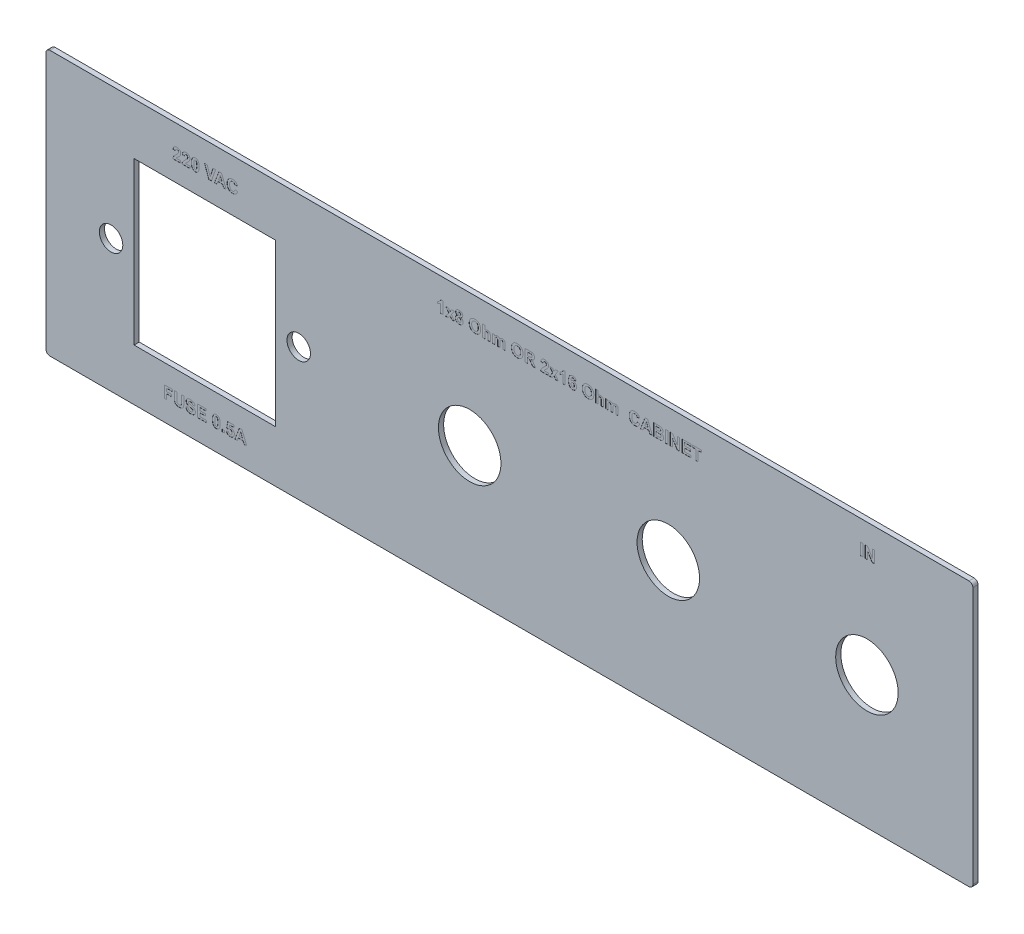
SolidWorks part; units mm, degrees
ref_plane "Front Plane" through (0, 0, 0) normal (0, 0, 1) x (1, 0, 0)
ref_plane "Top Plane" through (0, 0, 0) normal (0, 1, 0) x (1, 0, 0)
ref_plane "Right Plane" through (0, 0, 0) normal (1, 0, 0) x (0, 0, -1)
sketch "Sketch1" plane through (0, 0, 0) normal (0, 0, 1) x (1, 0, 0)
  line L0 (-88.9, 25.4) -> (88.9, 25.4)
  line L1 (88.9, 25.4) -> (88.9, -25.4)
  line L2 (88.9, -25.4) -> (-88.9, -25.4)
  line L3 (-88.9, -25.4) -> (-88.9, 25.4)
  line L4 (67.3365, 19.1836) -> (67.3365, 21.4564)
  line L5 (67.3365, 21.4564) -> (67.7952, 21.4564)
  line L6 (67.7952, 21.4564) -> (67.7952, 19.1836)
  line L7 (67.7952, 19.1836) -> (67.3365, 19.1836)
  line L8 (68.2371, 19.1836) -> (68.2371, 21.4564)
  line L9 (68.2371, 21.4564) -> (68.6837, 21.4564)
  line L10 (68.6837, 21.4564) -> (69.614, 19.9387)
  line L11 (69.614, 19.9387) -> (69.614, 21.4564)
  line L12 (69.614, 21.4564) -> (70.0405, 21.4564)
  line L13 (70.0405, 21.4564) -> (70.0405, 19.1836)
  line L14 (70.0405, 19.1836) -> (69.5796, 19.1836)
  line L15 (69.5796, 19.1836) -> (68.6636, 20.6658)
  line L16 (68.6636, 20.6658) -> (68.6636, 19.1836)
  line L17 (68.6636, 19.1836) -> (68.2371, 19.1836)
  line L18 (-12.7834, 19.1844) -> (-13.2189, 19.1844)
  line L19 (-13.2189, 19.1844) -> (-13.2189, 20.8264)
  line L20 (-13.7814, 20.4962) -> (-13.7814, 20.8915)
  line L21 (-13.1369, 21.4667) -> (-12.7834, 21.4667)
  line L22 (-12.7834, 21.4667) -> (-12.7834, 19.1844)
  line L23 (-12.2485, 19.1844) -> (-11.6548, 20.0327)
  line L24 (-11.6548, 20.0327) -> (-12.2236, 20.8306)
  line L25 (-12.2236, 20.8306) -> (-11.6918, 20.8306)
  line L26 (-11.6918, 20.8306) -> (-11.4002, 20.3782)
  line L27 (-11.4002, 20.3782) -> (-11.0933, 20.8306)
  line L28 (-11.0933, 20.8306) -> (-10.5816, 20.8306)
  line L29 (-10.5816, 20.8306) -> (-11.1399, 20.0512)
  line L30 (-11.1399, 20.0512) -> (-10.5308, 19.1844)
  line L31 (-10.5308, 19.1844) -> (-11.0653, 19.1844)
  line L32 (-11.0653, 19.1844) -> (-11.4002, 19.6945)
  line L33 (-11.4002, 19.6945) -> (-11.7384, 19.1844)
  line L34 (-11.7384, 19.1844) -> (-12.2485, 19.1844)
  line L35 (-4.7217, 21.4572) -> (-4.7217, 20.6216)
  line L36 (-3.6581, 20.1501) -> (-3.6581, 19.1844)
  line L37 (-3.6581, 19.1844) -> (-4.0936, 19.1844)
  line L38 (-4.0936, 19.1844) -> (-4.0936, 20.0544)
  line L39 (-4.7217, 20.0094) -> (-4.7217, 19.1844)
  line L40 (-4.7217, 19.1844) -> (-5.1572, 19.1844)
  line L41 (-5.1572, 19.1844) -> (-5.1572, 21.4572)
  line L42 (-5.1572, 21.4572) -> (-4.7217, 21.4572)
  line L43 (-3.249, 20.8306) -> (-2.8474, 20.8306)
  line L44 (-2.8474, 20.8306) -> (-2.8474, 20.6063)
  line L45 (-0.8276, 20.2369) -> (-0.8276, 19.1844)
  line L46 (-0.8276, 19.1844) -> (-1.2631, 19.1844)
  line L47 (-1.2631, 19.1844) -> (-1.2631, 20.1253)
  line L48 (-1.8182, 19.975) -> (-1.8182, 19.1844)
  line L49 (-1.8182, 19.1844) -> (-2.2537, 19.1844)
  line L50 (-2.2537, 19.1844) -> (-2.2537, 20.0866)
  line L51 (-2.8135, 19.9845) -> (-2.8135, 19.1844)
  line L52 (-2.8135, 19.1844) -> (-3.249, 19.1844)
  line L53 (-3.249, 19.1844) -> (-3.249, 20.8306)
  line L54 (2.9628, 19.1844) -> (2.9628, 21.4572)
  line L55 (2.9628, 21.4572) -> (3.9291, 21.4572)
  line L56 (4.7286, 19.6278) -> (5.0064, 19.1844)
  line L57 (5.0064, 19.1844) -> (4.4577, 19.1844)
  line L58 (4.4577, 19.1844) -> (4.1259, 19.6792)
  line L59 (3.5147, 20.1332) -> (3.4221, 20.1332)
  line L60 (3.4221, 20.1332) -> (3.4221, 19.1844)
  line L61 (3.4221, 19.1844) -> (2.9628, 19.1844)
  line L62 (3.4221, 20.4962) -> (3.7613, 20.4962)
  line L63 (3.7798, 21.0725) -> (3.4221, 21.0725)
  line L64 (3.4221, 21.0725) -> (3.4221, 20.4962)
  line L65 (7.5115, 19.5892) -> (7.5115, 19.1844)
  line L66 (7.5115, 19.1844) -> (5.9843, 19.1844)
  line L67 (6.4696, 20.7502) -> (6.0357, 20.7936)
  line L68 (6.6463, 19.5892) -> (7.5115, 19.5892)
  line L69 (7.6898, 19.1844) -> (8.2835, 20.0327)
  line L70 (8.2835, 20.0327) -> (7.7147, 20.8306)
  line L71 (7.7147, 20.8306) -> (8.2465, 20.8306)
  line L72 (8.2465, 20.8306) -> (8.5381, 20.3782)
  line L73 (8.5381, 20.3782) -> (8.845, 20.8306)
  line L74 (8.845, 20.8306) -> (9.3567, 20.8306)
  line L75 (9.3567, 20.8306) -> (8.7984, 20.0512)
  line L76 (8.7984, 20.0512) -> (9.4075, 19.1844)
  line L77 (9.4075, 19.1844) -> (8.873, 19.1844)
  line L78 (8.873, 19.1844) -> (8.5381, 19.6945)
  line L79 (8.5381, 19.6945) -> (8.1999, 19.1844)
  line L80 (8.1999, 19.1844) -> (7.6898, 19.1844)
  line L81 (10.6865, 19.1844) -> (10.251, 19.1844)
  line L82 (10.251, 19.1844) -> (10.251, 20.8264)
  line L83 (9.6885, 20.4962) -> (9.6885, 20.8915)
  line L84 (10.333, 21.4667) -> (10.6865, 21.4667)
  line L85 (10.6865, 21.4667) -> (10.6865, 19.1844)
  line L86 (12.8137, 20.9005) -> (12.3919, 20.8539)
  line L87 (16.9824, 21.4572) -> (16.9824, 20.6216)
  line L88 (18.046, 20.1501) -> (18.046, 19.1844)
  line L89 (18.046, 19.1844) -> (17.6105, 19.1844)
  line L90 (17.6105, 19.1844) -> (17.6105, 20.0544)
  line L91 (16.9824, 20.0094) -> (16.9824, 19.1844)
  line L92 (16.9824, 19.1844) -> (16.5469, 19.1844)
  line L93 (16.5469, 19.1844) -> (16.5469, 21.4572)
  line L94 (16.5469, 21.4572) -> (16.9824, 21.4572)
  line L95 (18.4551, 20.8306) -> (18.8567, 20.8306)
  line L96 (18.8567, 20.8306) -> (18.8567, 20.6063)
  line L97 (20.8765, 20.2369) -> (20.8765, 19.1844)
  line L98 (20.8765, 19.1844) -> (20.441, 19.1844)
  line L99 (20.441, 19.1844) -> (20.441, 20.1253)
  line L100 (19.8859, 19.975) -> (19.8859, 19.1844)
  line L101 (19.8859, 19.1844) -> (19.4504, 19.1844)
  line L102 (19.4504, 19.1844) -> (19.4504, 20.0866)
  line L103 (18.8906, 19.9845) -> (18.8906, 19.1844)
  line L104 (18.8906, 19.1844) -> (18.4551, 19.1844)
  line L105 (18.4551, 19.1844) -> (18.4551, 20.8306)
  line L106 (24.5325, 20.02) -> (24.977, 19.8792)
  line L107 (24.9712, 20.8306) -> (24.5166, 20.7222)
  line L108 (27.4207, 19.1844) -> (26.9212, 19.1844)
  line L109 (26.9212, 19.1844) -> (26.7227, 19.7009)
  line L110 (26.7227, 19.7009) -> (25.8142, 19.7009)
  line L111 (25.8142, 19.7009) -> (25.6268, 19.1844)
  line L112 (25.6268, 19.1844) -> (25.14, 19.1844)
  line L113 (25.14, 19.1844) -> (26.0253, 21.4572)
  line L114 (26.0253, 21.4572) -> (26.5105, 21.4572)
  line L115 (26.5105, 21.4572) -> (27.4207, 19.1844)
  line L116 (26.5756, 20.0835) -> (26.2624, 20.9269)
  line L117 (26.2624, 20.9269) -> (25.9554, 20.0835)
  line L118 (25.9554, 20.0835) -> (26.5756, 20.0835)
  line L119 (27.6652, 21.4572) -> (28.5738, 21.4572)
  line L120 (28.4388, 19.1844) -> (27.6652, 19.1844)
  line L121 (27.6652, 19.1844) -> (27.6652, 21.4572)
  line L122 (28.1245, 21.0788) -> (28.1245, 20.5534)
  line L123 (28.1245, 20.5534) -> (28.4251, 20.5534)
  line L124 (28.388, 21.0788) -> (28.1245, 21.0788)
  line L125 (28.1245, 20.175) -> (28.1245, 19.5675)
  line L126 (28.1245, 19.5675) -> (28.5489, 19.5675)
  line L127 (28.4949, 20.175) -> (28.1245, 20.175)
  line L128 (29.9428, 19.1844) -> (29.9428, 21.4572)
  line L129 (29.9428, 21.4572) -> (30.4015, 21.4572)
  line L130 (30.4015, 21.4572) -> (30.4015, 19.1844)
  line L131 (30.4015, 19.1844) -> (29.9428, 19.1844)
  line L132 (30.8434, 19.1844) -> (30.8434, 21.4572)
  line L133 (30.8434, 21.4572) -> (31.29, 21.4572)
  line L134 (31.29, 21.4572) -> (32.2203, 19.9395)
  line L135 (32.2203, 19.9395) -> (32.2203, 21.4572)
  line L136 (32.2203, 21.4572) -> (32.6468, 21.4572)
  line L137 (32.6468, 21.4572) -> (32.6468, 19.1844)
  line L138 (32.6468, 19.1844) -> (32.1859, 19.1844)
  line L139 (32.1859, 19.1844) -> (31.2699, 20.6666)
  line L140 (31.2699, 20.6666) -> (31.2699, 19.1844)
  line L141 (31.2699, 19.1844) -> (30.8434, 19.1844)
  line L142 (33.132, 19.1844) -> (33.132, 21.4572)
  line L143 (33.132, 21.4572) -> (34.8169, 21.4572)
  line L144 (34.8169, 21.4572) -> (34.8169, 21.0725)
  line L145 (34.8169, 21.0725) -> (33.5908, 21.0725)
  line L146 (33.5908, 21.0725) -> (33.5908, 20.5687)
  line L147 (33.5908, 20.5687) -> (34.7317, 20.5687)
  line L148 (34.7317, 20.5687) -> (34.7317, 20.1861)
  line L149 (34.7317, 20.1861) -> (33.5908, 20.1861)
  line L150 (33.5908, 20.1861) -> (33.5908, 19.5675)
  line L151 (33.5908, 19.5675) -> (34.8603, 19.5675)
  line L152 (34.8603, 19.5675) -> (34.8603, 19.1844)
  line L153 (34.8603, 19.1844) -> (33.132, 19.1844)
  line L154 (35.7609, 19.1844) -> (35.7609, 21.0725)
  line L155 (35.7609, 21.0725) -> (35.0868, 21.0725)
  line L156 (35.0868, 21.0725) -> (35.0868, 21.4572)
  line L157 (35.0868, 21.4572) -> (36.8928, 21.4572)
  line L158 (36.8928, 21.4572) -> (36.8928, 21.0725)
  line L159 (36.8928, 21.0725) -> (36.2202, 21.0725)
  line L160 (36.2202, 21.0725) -> (36.2202, 19.1844)
  line L161 (36.2202, 19.1844) -> (35.7609, 19.1844)
  line L162 (-63.0563, 19.5884) -> (-63.0563, 19.1836)
  line L163 (-63.0563, 19.1836) -> (-64.5835, 19.1836)
  line L164 (-64.0982, 20.7494) -> (-64.5321, 20.7928)
  line L165 (-63.9215, 19.5884) -> (-63.0563, 19.5884)
  line L166 (-61.2905, 19.5884) -> (-61.2905, 19.1836)
  line L167 (-61.2905, 19.1836) -> (-62.8177, 19.1836)
  line L168 (-62.3324, 20.7494) -> (-62.7663, 20.7928)
  line L169 (-62.1557, 19.5884) -> (-61.2905, 19.5884)
  line L170 (-57.6721, 19.1836) -> (-58.4844, 21.4564)
  line L171 (-58.4844, 21.4564) -> (-57.9864, 21.4564)
  line L172 (-57.9864, 21.4564) -> (-57.4118, 19.7742)
  line L173 (-57.4118, 19.7742) -> (-56.8551, 21.4564)
  line L174 (-56.8551, 21.4564) -> (-56.3682, 21.4564)
  line L175 (-56.3682, 21.4564) -> (-57.1821, 19.1836)
  line L176 (-57.1821, 19.1836) -> (-57.6721, 19.1836)
  line L177 (-54.3199, 19.1836) -> (-54.8194, 19.1836)
  line L178 (-54.8194, 19.1836) -> (-55.0179, 19.7001)
  line L179 (-55.0179, 19.7001) -> (-55.9264, 19.7001)
  line L180 (-55.9264, 19.7001) -> (-56.1138, 19.1836)
  line L181 (-56.1138, 19.1836) -> (-56.6006, 19.1836)
  line L182 (-56.6006, 19.1836) -> (-55.7153, 21.4564)
  line L183 (-55.7153, 21.4564) -> (-55.2301, 21.4564)
  line L184 (-55.2301, 21.4564) -> (-54.3199, 19.1836)
  line L185 (-55.165, 20.0827) -> (-55.4782, 20.9261)
  line L186 (-55.4782, 20.9261) -> (-55.7852, 20.0827)
  line L187 (-55.7852, 20.0827) -> (-55.165, 20.0827)
  line L188 (-52.6223, 20.0192) -> (-52.1778, 19.8784)
  line L189 (-52.1836, 20.8298) -> (-52.6382, 20.7214)
  line L198 (-66.2082, -21.4564) -> (-66.2082, -19.1836)
  line L199 (-66.2082, -19.1836) -> (-64.6498, -19.1836)
  line L200 (-64.6498, -19.1836) -> (-64.6498, -19.5683)
  line L201 (-64.6498, -19.5683) -> (-65.7489, -19.5683)
  line L202 (-65.7489, -19.5683) -> (-65.7489, -20.106)
  line L203 (-65.7489, -20.106) -> (-64.8001, -20.106)
  line L204 (-64.8001, -20.106) -> (-64.8001, -20.4907)
  line L205 (-64.8001, -20.4907) -> (-65.7489, -20.4907)
  line L206 (-65.7489, -20.4907) -> (-65.7489, -21.4564)
  line L207 (-65.7489, -21.4564) -> (-66.2082, -21.4564)
  line L208 (-64.2746, -19.1836) -> (-63.8158, -19.1836)
  line L209 (-63.8158, -19.1836) -> (-63.8158, -20.4145)
  line L210 (-62.9215, -20.4409) -> (-62.9215, -19.1836)
  line L211 (-62.9215, -19.1836) -> (-62.4628, -19.1836)
  line L212 (-62.4628, -19.1836) -> (-62.4628, -20.3774)
  line L213 (-64.2746, -20.3959) -> (-64.2746, -19.1836)
  line L214 (-62.095, -20.7172) -> (-61.6484, -20.6732)
  line L215 (-60.3122, -19.8334) -> (-60.771, -19.8536)
  line L216 (-59.8609, -21.4564) -> (-59.8609, -19.1836)
  line L217 (-59.8609, -19.1836) -> (-58.176, -19.1836)
  line L218 (-58.176, -19.1836) -> (-58.176, -19.5683)
  line L219 (-58.176, -19.5683) -> (-59.4021, -19.5683)
  line L220 (-59.4021, -19.5683) -> (-59.4021, -20.0721)
  line L221 (-59.4021, -20.0721) -> (-58.2612, -20.0721)
  line L222 (-58.2612, -20.0721) -> (-58.2612, -20.4547)
  line L223 (-58.2612, -20.4547) -> (-59.4021, -20.4547)
  line L224 (-59.4021, -20.4547) -> (-59.4021, -21.0733)
  line L225 (-59.4021, -21.0733) -> (-58.1326, -21.0733)
  line L226 (-58.1326, -21.0733) -> (-58.1326, -21.4564)
  line L227 (-58.1326, -21.4564) -> (-59.8609, -21.4564)
  line L228 (-55.0984, -21.4564) -> (-55.0984, -21.0209)
  line L229 (-55.0984, -21.0209) -> (-54.6629, -21.0209)
  line L230 (-54.6629, -21.0209) -> (-54.6629, -21.4564)
  line L231 (-54.6629, -21.4564) -> (-55.0984, -21.4564)
  line L232 (-54.3031, -20.8717) -> (-53.8692, -20.8272)
  line L233 (-53.8972, -20.4489) -> (-54.2507, -20.3975)
  line L234 (-54.2507, -20.3975) -> (-54.0274, -19.2148)
  line L235 (-54.0274, -19.2148) -> (-52.8754, -19.2148)
  line L236 (-52.8754, -19.2148) -> (-52.8754, -19.6223)
  line L237 (-52.8754, -19.6223) -> (-53.6972, -19.6223)
  line L238 (-53.6972, -19.6223) -> (-53.7655, -20.0086)
  line L239 (-50.3979, -21.4564) -> (-50.8974, -21.4564)
  line L240 (-50.8974, -21.4564) -> (-51.0959, -20.9399)
  line L241 (-51.0959, -20.9399) -> (-52.0044, -20.9399)
  line L242 (-52.0044, -20.9399) -> (-52.1918, -21.4564)
  line L243 (-52.1918, -21.4564) -> (-52.6786, -21.4564)
  line L244 (-52.6786, -21.4564) -> (-51.7933, -19.1836)
  line L245 (-51.7933, -19.1836) -> (-51.3081, -19.1836)
  line L246 (-51.3081, -19.1836) -> (-50.3979, -21.4564)
  line L247 (-51.243, -20.5573) -> (-51.5562, -19.7139)
  line L248 (-51.5562, -19.7139) -> (-51.8632, -20.5573)
  line L249 (-51.8632, -20.5573) -> (-51.243, -20.5573)
  line L250 (-88.9, -25.4002) -> (88.9, -25.4002)
  line L251 (88.9, -25.4002) -> (88.9, 25.3998)
  line L252 (88.9, 25.3998) -> (-88.9, 25.3998)
  line L253 (-88.9, 25.3998) -> (-88.9, -25.4002)
  spline S0 degree 3 poles (-13.2189, 20.8264) (-13.3782, 20.6772) (-13.5655, 20.5671) (-13.7814, 20.4962) knots 0.25 0.25 0.25 0.25 0.375 0.375 0.375 0.375
  spline S1 degree 3 poles (-13.7814, 20.8915) (-13.6682, 20.9285) (-13.5444, 20.9989) (-13.411, 21.1026) knots 0.5 0.5 0.5 0.5 0.625 0.625 0.625 0.625
  spline S2 degree 3 poles (-13.411, 21.1026) (-13.2777, 21.2069) (-13.1861, 21.3281) (-13.1369, 21.4667) knots 0.625 0.625 0.625 0.625 0.75 0.75 0.75 0.75
  spline S3 degree 3 poles (-9.9927, 20.4105) (-10.1054, 20.4581) (-10.1874, 20.5237) (-10.2382, 20.6068) knots 0 0 0 0 0.0625 0.0625 0.0625 0.0625
  spline S4 degree 3 poles (-10.2382, 20.6068) (-10.2895, 20.6899) (-10.3149, 20.7814) (-10.3149, 20.8804) knots 0.0625 0.0625 0.0625 0.0625 0.125 0.125 0.125 0.125
  spline S5 degree 3 poles (-10.3149, 20.8804) (-10.3149, 21.0497) (-10.2562, 21.1899) (-10.1377, 21.3005) knots 0.125 0.125 0.125 0.125 0.1875 0.1875 0.1875 0.1875
  spline S6 degree 3 poles (-10.1377, 21.3005) (-10.0191, 21.4111) (-9.8509, 21.4667) (-9.6328, 21.4667) knots 0.1875 0.1875 0.1875 0.1875 0.25 0.25 0.25 0.25
  spline S7 degree 3 poles (-9.6328, 21.4667) (-9.4169, 21.4667) (-9.2492, 21.4111) (-9.1301, 21.3005) knots 0.25 0.25 0.25 0.25 0.3125 0.3125 0.3125 0.3125
  spline S8 degree 3 poles (-9.1301, 21.3005) (-9.0105, 21.1899) (-8.9507, 21.0497) (-8.9507, 20.8804) knots 0.3125 0.3125 0.3125 0.3125 0.375 0.375 0.375 0.375
  spline S9 degree 3 poles (-8.9507, 20.8804) (-8.9507, 20.7751) (-8.9783, 20.6814) (-9.0333, 20.5989) knots 0.375 0.375 0.375 0.375 0.4375 0.4375 0.4375 0.4375
  spline S10 degree 3 poles (-9.0333, 20.5989) (-9.0878, 20.5168) (-9.1651, 20.4539) (-9.264, 20.4105) knots 0.4375 0.4375 0.4375 0.4375 0.5 0.5 0.5 0.5
  spline S11 degree 3 poles (-9.264, 20.4105) (-9.1381, 20.3602) (-9.0423, 20.2861) (-8.9767, 20.1888) knots 0.5 0.5 0.5 0.5 0.5625 0.5625 0.5625 0.5625
  spline S12 degree 3 poles (-8.9767, 20.1888) (-8.9111, 20.0919) (-8.8782, 19.9797) (-8.8782, 19.8527) knots 0.5625 0.5625 0.5625 0.5625 0.625 0.625 0.625 0.625
  spline S13 degree 3 poles (-8.8782, 19.8527) (-8.8782, 19.6427) (-8.9449, 19.4723) (-9.0788, 19.341) knots 0.625 0.625 0.625 0.625 0.6875 0.6875 0.6875 0.6875
  spline S14 degree 3 poles (-9.0788, 19.341) (-9.2127, 19.2098) (-9.3905, 19.1442) (-9.6127, 19.1442) knots 0.6875 0.6875 0.6875 0.6875 0.75 0.75 0.75 0.75
  spline S15 degree 3 poles (-9.6127, 19.1442) (-9.8196, 19.1442) (-9.9916, 19.1982) (-10.1292, 19.3066) knots 0.75 0.75 0.75 0.75 0.8125 0.8125 0.8125 0.8125
  spline S16 degree 3 poles (-10.1292, 19.3066) (-10.2916, 19.4352) (-10.3726, 19.6109) (-10.3726, 19.8342) knots 0.8125 0.8125 0.8125 0.8125 0.875 0.875 0.875 0.875
  spline S17 degree 3 poles (-10.3726, 19.8342) (-10.3726, 19.957) (-10.3419, 20.0697) (-10.2811, 20.1729) knots 0.875 0.875 0.875 0.875 0.9375 0.9375 0.9375 0.9375
  spline S18 degree 3 poles (-10.2811, 20.1729) (-10.2202, 20.2755) (-10.1239, 20.3549) (-9.9927, 20.4105) knots 0.9375 0.9375 0.9375 0.9375 1 1 1 1
  spline S19 degree 3 poles (-9.9027, 20.8492) (-9.9027, 20.7624) (-9.8784, 20.6946) (-9.8292, 20.6465) knots 0 0 0 0 0.125 0.125 0.125 0.125
  spline S20 degree 3 poles (-9.8292, 20.6465) (-9.7799, 20.5978) (-9.7149, 20.5735) (-9.6328, 20.5735) knots 0.125 0.125 0.125 0.125 0.25 0.25 0.25 0.25
  spline S21 degree 3 poles (-9.6328, 20.5735) (-9.5503, 20.5735) (-9.4841, 20.5978) (-9.4344, 20.647) knots 0.25 0.25 0.25 0.25 0.375 0.375 0.375 0.375
  spline S22 degree 3 poles (-9.4344, 20.647) (-9.3852, 20.6962) (-9.3603, 20.764) (-9.3603, 20.8507) knots 0.375 0.375 0.375 0.375 0.5 0.5 0.5 0.5
  spline S23 degree 3 poles (-9.3603, 20.8507) (-9.3603, 20.9328) (-9.3847, 20.9979) (-9.4339, 21.0471) knots 0.5 0.5 0.5 0.5 0.625 0.625 0.625 0.625
  spline S24 degree 3 poles (-9.4339, 21.0471) (-9.4831, 21.0963) (-9.5476, 21.1206) (-9.6286, 21.1206) knots 0.625 0.625 0.625 0.625 0.75 0.75 0.75 0.75
  spline S25 degree 3 poles (-9.6286, 21.1206) (-9.7122, 21.1206) (-9.7789, 21.0958) (-9.8286, 21.0465) knots 0.75 0.75 0.75 0.75 0.875 0.875 0.875 0.875
  spline S26 degree 3 poles (-9.8286, 21.0465) (-9.8778, 20.9968) (-9.9027, 20.9312) (-9.9027, 20.8492) knots 0.875 0.875 0.875 0.875 1 1 1 1
  spline S27 degree 3 poles (-9.9429, 19.876) (-9.9429, 19.7559) (-9.9122, 19.6622) (-9.8509, 19.595) knots 0 0 0 0 0.125 0.125 0.125 0.125
  spline S28 degree 3 poles (-9.8509, 19.595) (-9.7895, 19.5278) (-9.7127, 19.4945) (-9.6207, 19.4945) knots 0.125 0.125 0.125 0.125 0.25 0.25 0.25 0.25
  spline S29 degree 3 poles (-9.6207, 19.4945) (-9.5307, 19.4945) (-9.4561, 19.5268) (-9.3974, 19.5913) knots 0.25 0.25 0.25 0.25 0.375 0.375 0.375 0.375
  spline S30 degree 3 poles (-9.3974, 19.5913) (-9.3386, 19.6559) (-9.309, 19.749) (-9.309, 19.8713) knots 0.375 0.375 0.375 0.375 0.5 0.5 0.5 0.5
  spline S31 degree 3 poles (-9.309, 19.8713) (-9.309, 19.9776) (-9.3391, 20.0633) (-9.3989, 20.1279) knots 0.5 0.5 0.5 0.5 0.625 0.625 0.625 0.625
  spline S32 degree 3 poles (-9.3989, 20.1279) (-9.4587, 20.1925) (-9.5349, 20.2247) (-9.627, 20.2247) knots 0.625 0.625 0.625 0.625 0.75 0.75 0.75 0.75
  spline S33 degree 3 poles (-9.627, 20.2247) (-9.7334, 20.2247) (-9.8128, 20.1877) (-9.8646, 20.1147) knots 0.75 0.75 0.75 0.75 0.875 0.875 0.875 0.875
  spline S34 degree 3 poles (-9.8646, 20.1147) (-9.917, 20.0411) (-9.9429, 19.9617) (-9.9429, 19.876) knots 0.875 0.875 0.875 0.875 1 1 1 1
  spline S35 degree 3 poles (-7.7152, 20.3068) (-7.7152, 20.5385) (-7.6808, 20.7327) (-7.6115, 20.8899) knots 0 0 0 0 0.1 0.1 0.1 0.1
  spline S36 degree 3 poles (-7.6115, 20.8899) (-7.5596, 21.0053) (-7.4892, 21.1095) (-7.3998, 21.2016) knots 0.1 0.1 0.1 0.1 0.2 0.2 0.2 0.2
  spline S37 degree 3 poles (-7.3998, 21.2016) (-7.3104, 21.2931) (-7.2125, 21.3614) (-7.1061, 21.4058) knots 0.2 0.2 0.2 0.2 0.3 0.3 0.3 0.3
  spline S38 degree 3 poles (-7.1061, 21.4058) (-6.9643, 21.4662) (-6.8013, 21.4958) (-6.6161, 21.4958) knots 0.3 0.3 0.3 0.3 0.4 0.4 0.4 0.4
  spline S39 degree 3 poles (-6.6161, 21.4958) (-6.2811, 21.4958) (-6.0134, 21.3921) (-5.8123, 21.1841) knots 0.4 0.4 0.4 0.4 0.5 0.5 0.5 0.5
  spline S40 degree 3 poles (-5.8123, 21.1841) (-5.6112, 20.9767) (-5.5107, 20.6878) (-5.5107, 20.3179) knots 0.5 0.5 0.5 0.5 0.6 0.6 0.6 0.6
  spline S41 degree 3 poles (-5.5107, 20.3179) (-5.5107, 19.9506) (-5.6107, 19.6638) (-5.8102, 19.4564) knots 0.6 0.6 0.6 0.6 0.7 0.7 0.7 0.7
  spline S42 degree 3 poles (-5.8102, 19.4564) (-6.0097, 19.2495) (-6.2764, 19.1458) (-6.6098, 19.1458) knots 0.7 0.7 0.7 0.7 0.8 0.8 0.8 0.8
  spline S43 degree 3 poles (-6.6098, 19.1458) (-6.9479, 19.1458) (-7.2167, 19.249) (-7.4162, 19.4548) knots 0.8 0.8 0.8 0.8 0.9 0.9 0.9 0.9
  spline S44 degree 3 poles (-7.4162, 19.4548) (-7.6157, 19.6612) (-7.7152, 19.9453) (-7.7152, 20.3068) knots 0.9 0.9 0.9 0.9 1 1 1 1
  spline S45 degree 3 poles (-7.2426, 20.3221) (-7.2426, 20.0649) (-7.1828, 19.8697) (-7.0643, 19.7369) knots 0 0 0 0 0.125 0.125 0.125 0.125
  spline S46 degree 3 poles (-7.0643, 19.7369) (-6.9452, 19.604) (-6.7944, 19.5379) (-6.6113, 19.5379) knots 0.125 0.125 0.125 0.125 0.25 0.25 0.25 0.25
  spline S47 degree 3 poles (-6.6113, 19.5379) (-6.4288, 19.5379) (-6.2785, 19.6035) (-6.161, 19.7358) knots 0.25 0.25 0.25 0.25 0.375 0.375 0.375 0.375
  spline S48 degree 3 poles (-6.161, 19.7358) (-6.0441, 19.8676) (-5.9853, 20.0649) (-5.9853, 20.3285) knots 0.375 0.375 0.375 0.375 0.5 0.5 0.5 0.5
  spline S49 degree 3 poles (-5.9853, 20.3285) (-5.9853, 20.5888) (-6.0425, 20.783) (-6.1563, 20.9116) knots 0.5 0.5 0.5 0.5 0.625 0.625 0.625 0.625
  spline S50 degree 3 poles (-6.1563, 20.9116) (-6.2706, 21.0397) (-6.4224, 21.1037) (-6.6113, 21.1037) knots 0.625 0.625 0.625 0.625 0.75 0.75 0.75 0.75
  spline S51 degree 3 poles (-6.6113, 21.1037) (-6.8008, 21.1037) (-6.9532, 21.0386) (-7.0691, 20.909) knots 0.75 0.75 0.75 0.75 0.875 0.875 0.875 0.875
  spline S52 degree 3 poles (-7.0691, 20.909) (-7.1844, 20.7793) (-7.2426, 20.584) (-7.2426, 20.3221) knots 0.875 0.875 0.875 0.875 1 1 1 1
  spline S53 degree 3 poles (-4.7217, 20.6216) (-4.581, 20.7857) (-4.4132, 20.8682) (-4.2179, 20.8682) knots 0.052632 0.052632 0.052632 0.052632 0.105263 0.105263 0.105263 0.105263
  spline S54 degree 3 poles (-4.2179, 20.8682) (-4.1174, 20.8682) (-4.0274, 20.8492) (-3.9465, 20.8121) knots 0.105263 0.105263 0.105263 0.105263 0.157895 0.157895 0.157895 0.157895
  spline S55 degree 3 poles (-3.9465, 20.8121) (-3.866, 20.7751) (-3.8052, 20.7275) (-3.7644, 20.6698) knots 0.157895 0.157895 0.157895 0.157895 0.210526 0.210526 0.210526 0.210526
  spline S56 degree 3 poles (-3.7644, 20.6698) (-3.7237, 20.6116) (-3.6957, 20.5475) (-3.6808, 20.4772) knots 0.210526 0.210526 0.210526 0.210526 0.263158 0.263158 0.263158 0.263158
  spline S57 degree 3 poles (-3.6808, 20.4772) (-3.6655, 20.4073) (-3.6581, 20.2978) (-3.6581, 20.1501) knots 0.263158 0.263158 0.263158 0.263158 0.315789 0.315789 0.315789 0.315789
  spline S58 degree 3 poles (-4.0936, 20.0544) (-4.0936, 20.2269) (-4.1021, 20.3364) (-4.1185, 20.383) knots 0.473684 0.473684 0.473684 0.473684 0.526316 0.526316 0.526316 0.526316
  spline S59 degree 3 poles (-4.1185, 20.383) (-4.1354, 20.4295) (-4.1645, 20.466) (-4.2063, 20.4936) knots 0.526316 0.526316 0.526316 0.526316 0.578947 0.578947 0.578947 0.578947
  spline S60 degree 3 poles (-4.2063, 20.4936) (-4.2481, 20.5211) (-4.3005, 20.5348) (-4.3635, 20.5348) knots 0.578947 0.578947 0.578947 0.578947 0.631579 0.631579 0.631579 0.631579
  spline S61 degree 3 poles (-4.3635, 20.5348) (-4.436, 20.5348) (-4.5005, 20.5174) (-4.5571, 20.4819) knots 0.631579 0.631579 0.631579 0.631579 0.684211 0.684211 0.684211 0.684211
  spline S62 degree 3 poles (-4.5571, 20.4819) (-4.6143, 20.447) (-4.6561, 20.3941) (-4.682, 20.3232) knots 0.684211 0.684211 0.684211 0.684211 0.736842 0.736842 0.736842 0.736842
  spline S63 degree 3 poles (-4.682, 20.3232) (-4.7085, 20.2523) (-4.7217, 20.1475) (-4.7217, 20.0094) knots 0.736842 0.736842 0.736842 0.736842 0.789474 0.789474 0.789474 0.789474
  spline S64 degree 3 poles (-2.8474, 20.6063) (-2.704, 20.7809) (-2.5325, 20.8682) (-2.3341, 20.8682) knots 0.066667 0.066667 0.066667 0.066667 0.1 0.1 0.1 0.1
  spline S65 degree 3 poles (-2.3341, 20.8682) (-2.2288, 20.8682) (-2.1373, 20.8465) (-2.06, 20.8031) knots 0.1 0.1 0.1 0.1 0.133333 0.133333 0.133333 0.133333
  spline S66 degree 3 poles (-2.06, 20.8031) (-1.9822, 20.7597) (-1.9187, 20.6941) (-1.869, 20.6063) knots 0.133333 0.133333 0.133333 0.133333 0.166667 0.166667 0.166667 0.166667
  spline S67 degree 3 poles (-1.869, 20.6063) (-1.797, 20.6941) (-1.7187, 20.7597) (-1.6351, 20.8031) knots 0.166667 0.166667 0.166667 0.166667 0.2 0.2 0.2 0.2
  spline S68 degree 3 poles (-1.6351, 20.8031) (-1.5515, 20.8465) (-1.462, 20.8682) (-1.3668, 20.8682) knots 0.2 0.2 0.2 0.2 0.233333 0.233333 0.233333 0.233333
  spline S69 degree 3 poles (-1.3668, 20.8682) (-1.2461, 20.8682) (-1.1435, 20.8433) (-1.0599, 20.7941) knots 0.233333 0.233333 0.233333 0.233333 0.266667 0.266667 0.266667 0.266667
  spline S70 degree 3 poles (-1.0599, 20.7941) (-0.9763, 20.7454) (-0.9138, 20.6729) (-0.8725, 20.5782) knots 0.266667 0.266667 0.266667 0.266667 0.3 0.3 0.3 0.3
  spline S71 degree 3 poles (-0.8725, 20.5782) (-0.8424, 20.5078) (-0.8276, 20.3941) (-0.8276, 20.2369) knots 0.3 0.3 0.3 0.3 0.333333 0.333333 0.333333 0.333333
  spline S72 degree 3 poles (-1.2631, 20.1253) (-1.2631, 20.2888) (-1.2779, 20.3941) (-1.3081, 20.4417) knots 0.433333 0.433333 0.433333 0.433333 0.466667 0.466667 0.466667 0.466667
  spline S73 degree 3 poles (-1.3081, 20.4417) (-1.3483, 20.5036) (-1.4102, 20.5348) (-1.4938, 20.5348) knots 0.466667 0.466667 0.466667 0.466667 0.5 0.5 0.5 0.5
  spline S74 degree 3 poles (-1.4938, 20.5348) (-1.5552, 20.5348) (-1.6123, 20.5163) (-1.6663, 20.4787) knots 0.5 0.5 0.5 0.5 0.533333 0.533333 0.533333 0.533333
  spline S75 degree 3 poles (-1.6663, 20.4787) (-1.7197, 20.4417) (-1.7584, 20.3872) (-1.7822, 20.3152) knots 0.533333 0.533333 0.533333 0.533333 0.566667 0.566667 0.566667 0.566667
  spline S76 degree 3 poles (-1.7822, 20.3152) (-1.806, 20.2433) (-1.8182, 20.13) (-1.8182, 19.975) knots 0.566667 0.566667 0.566667 0.566667 0.6 0.6 0.6 0.6
  spline S77 degree 3 poles (-2.2537, 20.0866) (-2.2537, 20.247) (-2.2616, 20.3502) (-2.277, 20.3967) knots 0.7 0.7 0.7 0.7 0.733333 0.733333 0.733333 0.733333
  spline S78 degree 3 poles (-2.277, 20.3967) (-2.2923, 20.4433) (-2.3166, 20.4777) (-2.3489, 20.5004) knots 0.733333 0.733333 0.733333 0.733333 0.766667 0.766667 0.766667 0.766667
  spline S79 degree 3 poles (-2.3489, 20.5004) (-2.3817, 20.5232) (-2.4257, 20.5348) (-2.4817, 20.5348) knots 0.766667 0.766667 0.766667 0.766667 0.8 0.8 0.8 0.8
  spline S80 degree 3 poles (-2.4817, 20.5348) (-2.5489, 20.5348) (-2.6093, 20.5168) (-2.6627, 20.4803) knots 0.8 0.8 0.8 0.8 0.833333 0.833333 0.833333 0.833333
  spline S81 degree 3 poles (-2.6627, 20.4803) (-2.7167, 20.4443) (-2.7553, 20.392) (-2.7786, 20.3237) knots 0.833333 0.833333 0.833333 0.833333 0.866667 0.866667 0.866667 0.866667
  spline S82 degree 3 poles (-2.7786, 20.3237) (-2.8019, 20.2554) (-2.8135, 20.1427) (-2.8135, 19.9845) knots 0.866667 0.866667 0.866667 0.866667 0.9 0.9 0.9 0.9
  spline S83 degree 3 poles (0.399, 20.3068) (0.399, 20.5385) (0.4334, 20.7327) (0.5027, 20.8899) knots 0 0 0 0 0.1 0.1 0.1 0.1
  spline S84 degree 3 poles (0.5027, 20.8899) (0.5546, 21.0053) (0.625, 21.1095) (0.7144, 21.2016) knots 0.1 0.1 0.1 0.1 0.2 0.2 0.2 0.2
  spline S85 degree 3 poles (0.7144, 21.2016) (0.8038, 21.2931) (0.9017, 21.3614) (1.0081, 21.4058) knots 0.2 0.2 0.2 0.2 0.3 0.3 0.3 0.3
  spline S86 degree 3 poles (1.0081, 21.4058) (1.1499, 21.4662) (1.3129, 21.4958) (1.4981, 21.4958) knots 0.3 0.3 0.3 0.3 0.4 0.4 0.4 0.4
  spline S87 degree 3 poles (1.4981, 21.4958) (1.8331, 21.4958) (2.1008, 21.3921) (2.3019, 21.1841) knots 0.4 0.4 0.4 0.4 0.5 0.5 0.5 0.5
  spline S88 degree 3 poles (2.3019, 21.1841) (2.503, 20.9767) (2.6035, 20.6878) (2.6035, 20.3179) knots 0.5 0.5 0.5 0.5 0.6 0.6 0.6 0.6
  spline S89 degree 3 poles (2.6035, 20.3179) (2.6035, 19.9506) (2.5035, 19.6638) (2.304, 19.4564) knots 0.6 0.6 0.6 0.6 0.7 0.7 0.7 0.7
  spline S90 degree 3 poles (2.304, 19.4564) (2.1045, 19.2495) (1.8378, 19.1458) (1.5044, 19.1458) knots 0.7 0.7 0.7 0.7 0.8 0.8 0.8 0.8
  spline S91 degree 3 poles (1.5044, 19.1458) (1.1663, 19.1458) (0.8975, 19.249) (0.698, 19.4548) knots 0.8 0.8 0.8 0.8 0.9 0.9 0.9 0.9
  spline S92 degree 3 poles (0.698, 19.4548) (0.4985, 19.6612) (0.399, 19.9453) (0.399, 20.3068) knots 0.9 0.9 0.9 0.9 1 1 1 1
  spline S93 degree 3 poles (0.8716, 20.3221) (0.8716, 20.0649) (0.9314, 19.8697) (1.0499, 19.7369) knots 0 0 0 0 0.125 0.125 0.125 0.125
  spline S94 degree 3 poles (1.0499, 19.7369) (1.169, 19.604) (1.3198, 19.5379) (1.5029, 19.5379) knots 0.125 0.125 0.125 0.125 0.25 0.25 0.25 0.25
  spline S95 degree 3 poles (1.5029, 19.5379) (1.6854, 19.5379) (1.8357, 19.6035) (1.9532, 19.7358) knots 0.25 0.25 0.25 0.25 0.375 0.375 0.375 0.375
  spline S96 degree 3 poles (1.9532, 19.7358) (2.0701, 19.8676) (2.1289, 20.0649) (2.1289, 20.3285) knots 0.375 0.375 0.375 0.375 0.5 0.5 0.5 0.5
  spline S97 degree 3 poles (2.1289, 20.3285) (2.1289, 20.5888) (2.0717, 20.783) (1.9579, 20.9116) knots 0.5 0.5 0.5 0.5 0.625 0.625 0.625 0.625
  spline S98 degree 3 poles (1.9579, 20.9116) (1.8436, 21.0397) (1.6918, 21.1037) (1.5029, 21.1037) knots 0.625 0.625 0.625 0.625 0.75 0.75 0.75 0.75
  spline S99 degree 3 poles (1.5029, 21.1037) (1.3134, 21.1037) (1.161, 21.0386) (1.0451, 20.909) knots 0.75 0.75 0.75 0.75 0.875 0.875 0.875 0.875
  spline S100 degree 3 poles (1.0451, 20.909) (0.9298, 20.7793) (0.8716, 20.584) (0.8716, 20.3221) knots 0.875 0.875 0.875 0.875 1 1 1 1
  spline S101 degree 3 poles (3.9291, 21.4572) (4.172, 21.4572) (4.3482, 21.4365) (4.4582, 21.3958) knots 0.111111 0.111111 0.111111 0.111111 0.166667 0.166667 0.166667 0.166667
  spline S102 degree 3 poles (4.4582, 21.3958) (4.5683, 21.355) (4.6567, 21.2825) (4.7228, 21.1783) knots 0.166667 0.166667 0.166667 0.166667 0.222222 0.222222 0.222222 0.222222
  spline S103 degree 3 poles (4.7228, 21.1783) (4.789, 21.0735) (4.8218, 20.9545) (4.8218, 20.8201) knots 0.222222 0.222222 0.222222 0.222222 0.277778 0.277778 0.277778 0.277778
  spline S104 degree 3 poles (4.8218, 20.8201) (4.8218, 20.6497) (4.7715, 20.5084) (4.6715, 20.3973) knots 0.277778 0.277778 0.277778 0.277778 0.333333 0.333333 0.333333 0.333333
  spline S105 degree 3 poles (4.6715, 20.3973) (4.5715, 20.2867) (4.4212, 20.2163) (4.2217, 20.1877) knots 0.333333 0.333333 0.333333 0.333333 0.388889 0.388889 0.388889 0.388889
  spline S106 degree 3 poles (4.2217, 20.1877) (4.3212, 20.1295) (4.4032, 20.066) (4.4678, 19.9967) knots 0.388889 0.388889 0.388889 0.388889 0.444444 0.444444 0.444444 0.444444
  spline S107 degree 3 poles (4.4678, 19.9967) (4.5323, 19.9274) (4.6191, 19.8046) (4.7286, 19.6278) knots 0.444444 0.444444 0.444444 0.444444 0.5 0.5 0.5 0.5
  spline S108 degree 3 poles (4.1259, 19.6792) (4.0079, 19.8559) (3.9275, 19.967) (3.8841, 20.0131) knots 0.666667 0.666667 0.666667 0.666667 0.722222 0.722222 0.722222 0.722222
  spline S109 degree 3 poles (3.8841, 20.0131) (3.8407, 20.0591) (3.7947, 20.0903) (3.746, 20.1078) knots 0.722222 0.722222 0.722222 0.722222 0.777778 0.777778 0.777778 0.777778
  spline S110 degree 3 poles (3.746, 20.1078) (3.6973, 20.1247) (3.6206, 20.1332) (3.5147, 20.1332) knots 0.777778 0.777778 0.777778 0.777778 0.833333 0.833333 0.833333 0.833333
  spline S111 degree 3 poles (3.7613, 20.4962) (3.9815, 20.4962) (4.119, 20.5052) (4.1741, 20.5237) knots 0.111111 0.111111 0.111111 0.111111 0.222222 0.222222 0.222222 0.222222
  spline S112 degree 3 poles (4.1741, 20.5237) (4.2286, 20.5422) (4.2714, 20.5745) (4.3027, 20.62) knots 0.222222 0.222222 0.222222 0.222222 0.333333 0.333333 0.333333 0.333333
  spline S113 degree 3 poles (4.3027, 20.62) (4.3333, 20.6655) (4.3492, 20.7222) (4.3492, 20.7904) knots 0.333333 0.333333 0.333333 0.333333 0.444444 0.444444 0.444444 0.444444
  spline S114 degree 3 poles (4.3492, 20.7904) (4.3492, 20.8672) (4.3286, 20.9285) (4.2878, 20.9756) knots 0.444444 0.444444 0.444444 0.444444 0.555556 0.555556 0.555556 0.555556
  spline S115 degree 3 poles (4.2878, 20.9756) (4.2471, 21.0227) (4.1894, 21.0524) (4.1148, 21.0651) knots 0.555556 0.555556 0.555556 0.555556 0.666667 0.666667 0.666667 0.666667
  spline S116 degree 3 poles (4.1148, 21.0651) (4.0778, 21.0698) (3.9661, 21.0725) (3.7798, 21.0725) knots 0.666667 0.666667 0.666667 0.666667 0.777778 0.777778 0.777778 0.777778
  spline S117 degree 3 poles (5.9843, 19.1844) (6.0013, 19.3373) (6.0505, 19.4823) (6.1336, 19.6194) knots 0.095238 0.095238 0.095238 0.095238 0.142857 0.142857 0.142857 0.142857
  spline S118 degree 3 poles (6.1336, 19.6194) (6.2161, 19.7564) (6.3796, 19.9379) (6.6231, 20.1644) knots 0.142857 0.142857 0.142857 0.142857 0.190476 0.190476 0.190476 0.190476
  spline S119 degree 3 poles (6.6231, 20.1644) (6.8199, 20.347) (6.94, 20.4713) (6.9845, 20.5364) knots 0.190476 0.190476 0.190476 0.190476 0.238095 0.238095 0.238095 0.238095
  spline S120 degree 3 poles (6.9845, 20.5364) (7.0443, 20.6264) (7.0744, 20.7153) (7.0744, 20.8031) knots 0.238095 0.238095 0.238095 0.238095 0.285714 0.285714 0.285714 0.285714
  spline S121 degree 3 poles (7.0744, 20.8031) (7.0744, 20.9) (7.0485, 20.9746) (6.9961, 21.027) knots 0.285714 0.285714 0.285714 0.285714 0.333333 0.333333 0.333333 0.333333
  spline S122 degree 3 poles (6.9961, 21.027) (6.9437, 21.0793) (6.8718, 21.1053) (6.7797, 21.1053) knots 0.333333 0.333333 0.333333 0.333333 0.380952 0.380952 0.380952 0.380952
  spline S123 degree 3 poles (6.7797, 21.1053) (6.6887, 21.1053) (6.6167, 21.0778) (6.5627, 21.0233) knots 0.380952 0.380952 0.380952 0.380952 0.428571 0.428571 0.428571 0.428571
  spline S124 degree 3 poles (6.5627, 21.0233) (6.5093, 20.9682) (6.4781, 20.8772) (6.4696, 20.7502) knots 0.428571 0.428571 0.428571 0.428571 0.47619 0.47619 0.47619 0.47619
  spline S125 degree 3 poles (6.0357, 20.7936) (6.0616, 21.0333) (6.1426, 21.2053) (6.2791, 21.3101) knots 0.52381 0.52381 0.52381 0.52381 0.571429 0.571429 0.571429 0.571429
  spline S126 degree 3 poles (6.2791, 21.3101) (6.4156, 21.4143) (6.586, 21.4667) (6.7908, 21.4667) knots 0.571429 0.571429 0.571429 0.571429 0.619048 0.619048 0.619048 0.619048
  spline S127 degree 3 poles (6.7908, 21.4667) (7.0152, 21.4667) (7.1914, 21.4058) (7.3194, 21.2852) knots 0.619048 0.619048 0.619048 0.619048 0.666667 0.666667 0.666667 0.666667
  spline S128 degree 3 poles (7.3194, 21.2852) (7.4475, 21.164) (7.5115, 21.0137) (7.5115, 20.8338) knots 0.666667 0.666667 0.666667 0.666667 0.714286 0.714286 0.714286 0.714286
  spline S129 degree 3 poles (7.5115, 20.8338) (7.5115, 20.7317) (7.493, 20.6343) (7.4565, 20.5417) knots 0.714286 0.714286 0.714286 0.714286 0.761905 0.761905 0.761905 0.761905
  spline S130 degree 3 poles (7.4565, 20.5417) (7.42, 20.4491) (7.3618, 20.3523) (7.2824, 20.2512) knots 0.761905 0.761905 0.761905 0.761905 0.809524 0.809524 0.809524 0.809524
  spline S131 degree 3 poles (7.2824, 20.2512) (7.2295, 20.184) (7.1342, 20.0872) (6.9972, 19.9612) knots 0.809524 0.809524 0.809524 0.809524 0.857143 0.857143 0.857143 0.857143
  spline S132 degree 3 poles (6.9972, 19.9612) (6.8596, 19.8353) (6.7723, 19.7511) (6.7358, 19.7099) knots 0.857143 0.857143 0.857143 0.857143 0.904762 0.904762 0.904762 0.904762
  spline S133 degree 3 poles (6.7358, 19.7099) (6.6993, 19.6686) (6.6691, 19.6284) (6.6463, 19.5892) knots 0.904762 0.904762 0.904762 0.904762 0.952381 0.952381 0.952381 0.952381
  spline S134 degree 3 poles (10.251, 20.8264) (10.0917, 20.6772) (9.9044, 20.5671) (9.6885, 20.4962) knots 0.25 0.25 0.25 0.25 0.375 0.375 0.375 0.375
  spline S135 degree 3 poles (9.6885, 20.8915) (9.8017, 20.9285) (9.9255, 20.9989) (10.0589, 21.1026) knots 0.5 0.5 0.5 0.5 0.625 0.625 0.625 0.625
  spline S136 degree 3 poles (10.0589, 21.1026) (10.1922, 21.2069) (10.2838, 21.3281) (10.333, 21.4667) knots 0.625 0.625 0.625 0.625 0.75 0.75 0.75 0.75
  spline S137 degree 3 poles (12.3919, 20.8539) (12.3819, 20.9407) (12.3549, 21.0047) (12.3115, 21.0465) knots 0.0625 0.0625 0.0625 0.0625 0.125 0.125 0.125 0.125
  spline S138 degree 3 poles (12.3115, 21.0465) (12.2681, 21.0878) (12.2115, 21.1085) (12.1422, 21.1085) knots 0.125 0.125 0.125 0.125 0.1875 0.1875 0.1875 0.1875
  spline S139 degree 3 poles (12.1422, 21.1085) (12.0506, 21.1085) (11.9728, 21.0672) (11.9088, 20.9841) knots 0.1875 0.1875 0.1875 0.1875 0.25 0.25 0.25 0.25
  spline S140 degree 3 poles (11.9088, 20.9841) (11.8453, 20.9015) (11.8056, 20.7296) (11.7887, 20.4682) knots 0.25 0.25 0.25 0.25 0.3125 0.3125 0.3125 0.3125
  spline S141 degree 3 poles (11.7887, 20.4682) (11.8977, 20.5962) (12.0321, 20.6602) (12.1935, 20.6602) knots 0.3125 0.3125 0.3125 0.3125 0.375 0.375 0.375 0.375
  spline S142 degree 3 poles (12.1935, 20.6602) (12.3755, 20.6602) (12.5311, 20.5909) (12.6608, 20.4523) knots 0.375 0.375 0.375 0.375 0.4375 0.4375 0.4375 0.4375
  spline S143 degree 3 poles (12.6608, 20.4523) (12.7904, 20.3142) (12.8555, 20.1353) (12.8555, 19.9162) knots 0.4375 0.4375 0.4375 0.4375 0.5 0.5 0.5 0.5
  spline S144 degree 3 poles (12.8555, 19.9162) (12.8555, 19.6834) (12.7872, 19.4971) (12.6507, 19.3564) knots 0.5 0.5 0.5 0.5 0.5625 0.5625 0.5625 0.5625
  spline S145 degree 3 poles (12.6507, 19.3564) (12.5147, 19.2162) (12.339, 19.1458) (12.1252, 19.1458) knots 0.5625 0.5625 0.5625 0.5625 0.625 0.625 0.625 0.625
  spline S146 degree 3 poles (12.1252, 19.1458) (11.8961, 19.1458) (11.7072, 19.2347) (11.5596, 19.413) knots 0.625 0.625 0.625 0.625 0.6875 0.6875 0.6875 0.6875
  spline S147 degree 3 poles (11.5596, 19.413) (11.4119, 19.5913) (11.3378, 19.8834) (11.3378, 20.2898) knots 0.6875 0.6875 0.6875 0.6875 0.75 0.75 0.75 0.75
  spline S148 degree 3 poles (11.3378, 20.2898) (11.3378, 20.7063) (11.4146, 21.0063) (11.5686, 21.1905) knots 0.75 0.75 0.75 0.75 0.8125 0.8125 0.8125 0.8125
  spline S149 degree 3 poles (11.5686, 21.1905) (11.7225, 21.3746) (11.9226, 21.4667) (12.1686, 21.4667) knots 0.8125 0.8125 0.8125 0.8125 0.875 0.875 0.875 0.875
  spline S150 degree 3 poles (12.1686, 21.4667) (12.3411, 21.4667) (12.484, 21.418) (12.5973, 21.3217) knots 0.875 0.875 0.875 0.875 0.9375 0.9375 0.9375 0.9375
  spline S151 degree 3 poles (12.5973, 21.3217) (12.7105, 21.2249) (12.7825, 21.0846) (12.8137, 20.9005) knots 0.9375 0.9375 0.9375 0.9375 1 1 1 1
  spline S152 degree 3 poles (11.8263, 19.9501) (11.8263, 19.8088) (11.8585, 19.6993) (11.9236, 19.6226) knots 0 0 0 0 0.125 0.125 0.125 0.125
  spline S153 degree 3 poles (11.9236, 19.6226) (11.9887, 19.5453) (12.0633, 19.5067) (12.1469, 19.5067) knots 0.125 0.125 0.125 0.125 0.25 0.25 0.25 0.25
  spline S154 degree 3 poles (12.1469, 19.5067) (12.2279, 19.5067) (12.2946, 19.5384) (12.3485, 19.6014) knots 0.25 0.25 0.25 0.25 0.375 0.375 0.375 0.375
  spline S155 degree 3 poles (12.3485, 19.6014) (12.4025, 19.6644) (12.429, 19.7681) (12.429, 19.9115) knots 0.375 0.375 0.375 0.375 0.5 0.5 0.5 0.5
  spline S156 degree 3 poles (12.429, 19.9115) (12.429, 20.0591) (12.4004, 20.1676) (12.3422, 20.2364) knots 0.5 0.5 0.5 0.5 0.625 0.625 0.625 0.625
  spline S157 degree 3 poles (12.3422, 20.2364) (12.2845, 20.3052) (12.212, 20.3396) (12.1252, 20.3396) knots 0.625 0.625 0.625 0.625 0.75 0.75 0.75 0.75
  spline S158 degree 3 poles (12.1252, 20.3396) (12.0416, 20.3396) (11.9707, 20.3068) (11.913, 20.2411) knots 0.75 0.75 0.75 0.75 0.875 0.875 0.875 0.875
  spline S159 degree 3 poles (11.913, 20.2411) (11.8548, 20.1755) (11.8263, 20.0782) (11.8263, 19.9501) knots 0.875 0.875 0.875 0.875 1 1 1 1
  spline S160 degree 3 poles (13.9889, 20.3068) (13.9889, 20.5385) (14.0233, 20.7327) (14.0926, 20.8899) knots 0 0 0 0 0.1 0.1 0.1 0.1
  spline S161 degree 3 poles (14.0926, 20.8899) (14.1445, 21.0053) (14.2149, 21.1095) (14.3043, 21.2016) knots 0.1 0.1 0.1 0.1 0.2 0.2 0.2 0.2
  spline S162 degree 3 poles (14.3043, 21.2016) (14.3937, 21.2931) (14.4916, 21.3614) (14.598, 21.4058) knots 0.2 0.2 0.2 0.2 0.3 0.3 0.3 0.3
  spline S163 degree 3 poles (14.598, 21.4058) (14.7398, 21.4662) (14.9028, 21.4958) (15.088, 21.4958) knots 0.3 0.3 0.3 0.3 0.4 0.4 0.4 0.4
  spline S164 degree 3 poles (15.088, 21.4958) (15.423, 21.4958) (15.6907, 21.3921) (15.8918, 21.1841) knots 0.4 0.4 0.4 0.4 0.5 0.5 0.5 0.5
  spline S165 degree 3 poles (15.8918, 21.1841) (16.0929, 20.9767) (16.1934, 20.6878) (16.1934, 20.3179) knots 0.5 0.5 0.5 0.5 0.6 0.6 0.6 0.6
  spline S166 degree 3 poles (16.1934, 20.3179) (16.1934, 19.9506) (16.0934, 19.6638) (15.8939, 19.4564) knots 0.6 0.6 0.6 0.6 0.7 0.7 0.7 0.7
  spline S167 degree 3 poles (15.8939, 19.4564) (15.6944, 19.2495) (15.4277, 19.1458) (15.0943, 19.1458) knots 0.7 0.7 0.7 0.7 0.8 0.8 0.8 0.8
  spline S168 degree 3 poles (15.0943, 19.1458) (14.7562, 19.1458) (14.4874, 19.249) (14.2879, 19.4548) knots 0.8 0.8 0.8 0.8 0.9 0.9 0.9 0.9
  spline S169 degree 3 poles (14.2879, 19.4548) (14.0884, 19.6612) (13.9889, 19.9453) (13.9889, 20.3068) knots 0.9 0.9 0.9 0.9 1 1 1 1
  spline S170 degree 3 poles (14.4615, 20.3221) (14.4615, 20.0649) (14.5213, 19.8697) (14.6398, 19.7369) knots 0 0 0 0 0.125 0.125 0.125 0.125
  spline S171 degree 3 poles (14.6398, 19.7369) (14.7589, 19.604) (14.9097, 19.5379) (15.0928, 19.5379) knots 0.125 0.125 0.125 0.125 0.25 0.25 0.25 0.25
  spline S172 degree 3 poles (15.0928, 19.5379) (15.2753, 19.5379) (15.4256, 19.6035) (15.5431, 19.7358) knots 0.25 0.25 0.25 0.25 0.375 0.375 0.375 0.375
  spline S173 degree 3 poles (15.5431, 19.7358) (15.66, 19.8676) (15.7188, 20.0649) (15.7188, 20.3285) knots 0.375 0.375 0.375 0.375 0.5 0.5 0.5 0.5
  spline S174 degree 3 poles (15.7188, 20.3285) (15.7188, 20.5888) (15.6616, 20.783) (15.5478, 20.9116) knots 0.5 0.5 0.5 0.5 0.625 0.625 0.625 0.625
  spline S175 degree 3 poles (15.5478, 20.9116) (15.4335, 21.0397) (15.2817, 21.1037) (15.0928, 21.1037) knots 0.625 0.625 0.625 0.625 0.75 0.75 0.75 0.75
  spline S176 degree 3 poles (15.0928, 21.1037) (14.9033, 21.1037) (14.7509, 21.0386) (14.635, 20.909) knots 0.75 0.75 0.75 0.75 0.875 0.875 0.875 0.875
  spline S177 degree 3 poles (14.635, 20.909) (14.5197, 20.7793) (14.4615, 20.584) (14.4615, 20.3221) knots 0.875 0.875 0.875 0.875 1 1 1 1
  spline S178 degree 3 poles (16.9824, 20.6216) (17.1231, 20.7857) (17.2909, 20.8682) (17.4862, 20.8682) knots 0.052632 0.052632 0.052632 0.052632 0.105263 0.105263 0.105263 0.105263
  spline S179 degree 3 poles (17.4862, 20.8682) (17.5867, 20.8682) (17.6767, 20.8492) (17.7576, 20.8121) knots 0.105263 0.105263 0.105263 0.105263 0.157895 0.157895 0.157895 0.157895
  spline S180 degree 3 poles (17.7576, 20.8121) (17.8381, 20.7751) (17.8989, 20.7275) (17.9397, 20.6698) knots 0.157895 0.157895 0.157895 0.157895 0.210526 0.210526 0.210526 0.210526
  spline S181 degree 3 poles (17.9397, 20.6698) (17.9804, 20.6116) (18.0084, 20.5475) (18.0233, 20.4772) knots 0.210526 0.210526 0.210526 0.210526 0.263158 0.263158 0.263158 0.263158
  spline S182 degree 3 poles (18.0233, 20.4772) (18.0386, 20.4073) (18.046, 20.2978) (18.046, 20.1501) knots 0.263158 0.263158 0.263158 0.263158 0.315789 0.315789 0.315789 0.315789
  spline S183 degree 3 poles (17.6105, 20.0544) (17.6105, 20.2269) (17.602, 20.3364) (17.5856, 20.383) knots 0.473684 0.473684 0.473684 0.473684 0.526316 0.526316 0.526316 0.526316
  spline S184 degree 3 poles (17.5856, 20.383) (17.5687, 20.4295) (17.5396, 20.466) (17.4978, 20.4936) knots 0.526316 0.526316 0.526316 0.526316 0.578947 0.578947 0.578947 0.578947
  spline S185 degree 3 poles (17.4978, 20.4936) (17.456, 20.5211) (17.4036, 20.5348) (17.3406, 20.5348) knots 0.578947 0.578947 0.578947 0.578947 0.631579 0.631579 0.631579 0.631579
  spline S186 degree 3 poles (17.3406, 20.5348) (17.2681, 20.5348) (17.2036, 20.5174) (17.147, 20.4819) knots 0.631579 0.631579 0.631579 0.631579 0.684211 0.684211 0.684211 0.684211
  spline S187 degree 3 poles (17.147, 20.4819) (17.0898, 20.447) (17.048, 20.3941) (17.0221, 20.3232) knots 0.684211 0.684211 0.684211 0.684211 0.736842 0.736842 0.736842 0.736842
  spline S188 degree 3 poles (17.0221, 20.3232) (16.9956, 20.2523) (16.9824, 20.1475) (16.9824, 20.0094) knots 0.736842 0.736842 0.736842 0.736842 0.789474 0.789474 0.789474 0.789474
  spline S189 degree 3 poles (18.8567, 20.6063) (19.0001, 20.7809) (19.1716, 20.8682) (19.37, 20.8682) knots 0.066667 0.066667 0.066667 0.066667 0.1 0.1 0.1 0.1
  spline S190 degree 3 poles (19.37, 20.8682) (19.4753, 20.8682) (19.5668, 20.8465) (19.6441, 20.8031) knots 0.1 0.1 0.1 0.1 0.133333 0.133333 0.133333 0.133333
  spline S191 degree 3 poles (19.6441, 20.8031) (19.7219, 20.7597) (19.7854, 20.6941) (19.8351, 20.6063) knots 0.133333 0.133333 0.133333 0.133333 0.166667 0.166667 0.166667 0.166667
  spline S192 degree 3 poles (19.8351, 20.6063) (19.9071, 20.6941) (19.9854, 20.7597) (20.069, 20.8031) knots 0.166667 0.166667 0.166667 0.166667 0.2 0.2 0.2 0.2
  spline S193 degree 3 poles (20.069, 20.8031) (20.1526, 20.8465) (20.2421, 20.8682) (20.3373, 20.8682) knots 0.2 0.2 0.2 0.2 0.233333 0.233333 0.233333 0.233333
  spline S194 degree 3 poles (20.3373, 20.8682) (20.458, 20.8682) (20.5606, 20.8433) (20.6442, 20.7941) knots 0.233333 0.233333 0.233333 0.233333 0.266667 0.266667 0.266667 0.266667
  spline S195 degree 3 poles (20.6442, 20.7941) (20.7278, 20.7454) (20.7903, 20.6729) (20.8316, 20.5782) knots 0.266667 0.266667 0.266667 0.266667 0.3 0.3 0.3 0.3
  spline S196 degree 3 poles (20.8316, 20.5782) (20.8617, 20.5078) (20.8765, 20.3941) (20.8765, 20.2369) knots 0.3 0.3 0.3 0.3 0.333333 0.333333 0.333333 0.333333
  spline S197 degree 3 poles (20.441, 20.1253) (20.441, 20.2888) (20.4262, 20.3941) (20.396, 20.4417) knots 0.433333 0.433333 0.433333 0.433333 0.466667 0.466667 0.466667 0.466667
  spline S198 degree 3 poles (20.396, 20.4417) (20.3558, 20.5036) (20.2939, 20.5348) (20.2103, 20.5348) knots 0.466667 0.466667 0.466667 0.466667 0.5 0.5 0.5 0.5
  spline S199 degree 3 poles (20.2103, 20.5348) (20.1489, 20.5348) (20.0918, 20.5163) (20.0378, 20.4787) knots 0.5 0.5 0.5 0.5 0.533333 0.533333 0.533333 0.533333
  spline S200 degree 3 poles (20.0378, 20.4787) (19.9844, 20.4417) (19.9457, 20.3872) (19.9219, 20.3152) knots 0.533333 0.533333 0.533333 0.533333 0.566667 0.566667 0.566667 0.566667
  spline S201 degree 3 poles (19.9219, 20.3152) (19.8981, 20.2433) (19.8859, 20.13) (19.8859, 19.975) knots 0.566667 0.566667 0.566667 0.566667 0.6 0.6 0.6 0.6
  spline S202 degree 3 poles (19.4504, 20.0866) (19.4504, 20.247) (19.4425, 20.3502) (19.4271, 20.3967) knots 0.7 0.7 0.7 0.7 0.733333 0.733333 0.733333 0.733333
  spline S203 degree 3 poles (19.4271, 20.3967) (19.4118, 20.4433) (19.3875, 20.4777) (19.3552, 20.5004) knots 0.733333 0.733333 0.733333 0.733333 0.766667 0.766667 0.766667 0.766667
  spline S204 degree 3 poles (19.3552, 20.5004) (19.3224, 20.5232) (19.2784, 20.5348) (19.2224, 20.5348) knots 0.766667 0.766667 0.766667 0.766667 0.8 0.8 0.8 0.8
  spline S205 degree 3 poles (19.2224, 20.5348) (19.1552, 20.5348) (19.0948, 20.5168) (19.0414, 20.4803) knots 0.8 0.8 0.8 0.8 0.833333 0.833333 0.833333 0.833333
  spline S206 degree 3 poles (19.0414, 20.4803) (18.9874, 20.4443) (18.9488, 20.392) (18.9255, 20.3237) knots 0.833333 0.833333 0.833333 0.833333 0.866667 0.866667 0.866667 0.866667
  spline S207 degree 3 poles (18.9255, 20.3237) (18.9022, 20.2554) (18.8906, 20.1427) (18.8906, 19.9845) knots 0.866667 0.866667 0.866667 0.866667 0.9 0.9 0.9 0.9
  spline S208 degree 3 poles (24.977, 19.8792) (24.9087, 19.631) (24.7955, 19.4469) (24.6367, 19.3262) knots 0.055556 0.055556 0.055556 0.055556 0.111111 0.111111 0.111111 0.111111
  spline S209 degree 3 poles (24.6367, 19.3262) (24.4785, 19.2061) (24.2769, 19.1458) (24.033, 19.1458) knots 0.111111 0.111111 0.111111 0.111111 0.166667 0.166667 0.166667 0.166667
  spline S210 degree 3 poles (24.033, 19.1458) (23.7313, 19.1458) (23.4832, 19.249) (23.289, 19.4548) knots 0.166667 0.166667 0.166667 0.166667 0.222222 0.222222 0.222222 0.222222
  spline S211 degree 3 poles (23.289, 19.4548) (23.0948, 19.6612) (22.9974, 19.9432) (22.9974, 20.3004) knots 0.222222 0.222222 0.222222 0.222222 0.277778 0.277778 0.277778 0.277778
  spline S212 degree 3 poles (22.9974, 20.3004) (22.9974, 20.6788) (23.0953, 20.9725) (23.2905, 21.182) knots 0.277778 0.277778 0.277778 0.277778 0.333333 0.333333 0.333333 0.333333
  spline S213 degree 3 poles (23.2905, 21.182) (23.4858, 21.391) (23.7425, 21.4958) (24.061, 21.4958) knots 0.333333 0.333333 0.333333 0.333333 0.388889 0.388889 0.388889 0.388889
  spline S214 degree 3 poles (24.061, 21.4958) (24.3388, 21.4958) (24.5648, 21.4138) (24.7383, 21.2492) knots 0.388889 0.388889 0.388889 0.388889 0.444444 0.444444 0.444444 0.444444
  spline S215 degree 3 poles (24.7383, 21.2492) (24.8421, 21.1524) (24.9193, 21.0127) (24.9712, 20.8306) knots 0.444444 0.444444 0.444444 0.444444 0.5 0.5 0.5 0.5
  spline S216 degree 3 poles (24.5166, 20.7222) (24.4902, 20.8402) (24.4341, 20.9333) (24.3483, 21.0016) knots 0.555556 0.555556 0.555556 0.555556 0.611111 0.611111 0.611111 0.611111
  spline S217 degree 3 poles (24.3483, 21.0016) (24.2632, 21.0698) (24.1594, 21.1037) (24.0377, 21.1037) knots 0.611111 0.611111 0.611111 0.611111 0.666667 0.666667 0.666667 0.666667
  spline S218 degree 3 poles (24.0377, 21.1037) (23.8695, 21.1037) (23.7324, 21.0434) (23.6276, 20.9222) knots 0.666667 0.666667 0.666667 0.666667 0.722222 0.722222 0.722222 0.722222
  spline S219 degree 3 poles (23.6276, 20.9222) (23.5228, 20.8015) (23.4705, 20.6057) (23.4705, 20.3348) knots 0.722222 0.722222 0.722222 0.722222 0.777778 0.777778 0.777778 0.777778
  spline S220 degree 3 poles (23.4705, 20.3348) (23.4705, 20.0475) (23.5218, 19.8427) (23.6255, 19.721) knots 0.777778 0.777778 0.777778 0.777778 0.833333 0.833333 0.833333 0.833333
  spline S221 degree 3 poles (23.6255, 19.721) (23.7287, 19.5987) (23.8631, 19.5379) (24.0282, 19.5379) knots 0.833333 0.833333 0.833333 0.833333 0.888889 0.888889 0.888889 0.888889
  spline S222 degree 3 poles (24.0282, 19.5379) (24.1504, 19.5379) (24.2552, 19.5765) (24.3431, 19.6543) knots 0.888889 0.888889 0.888889 0.888889 0.944444 0.944444 0.944444 0.944444
  spline S223 degree 3 poles (24.3431, 19.6543) (24.4309, 19.7316) (24.4939, 19.8538) (24.5325, 20.02) knots 0.944444 0.944444 0.944444 0.944444 1 1 1 1
  spline S224 degree 3 poles (28.5738, 21.4572) (28.7537, 21.4572) (28.8881, 21.4498) (28.9765, 21.4344) knots 0.066667 0.066667 0.066667 0.066667 0.133333 0.133333 0.133333 0.133333
  spline S225 degree 3 poles (28.9765, 21.4344) (29.0649, 21.4196) (29.1437, 21.3884) (29.2135, 21.3408) knots 0.133333 0.133333 0.133333 0.133333 0.2 0.2 0.2 0.2
  spline S226 degree 3 poles (29.2135, 21.3408) (29.2834, 21.2931) (29.3411, 21.2302) (29.3876, 21.1508) knots 0.2 0.2 0.2 0.2 0.266667 0.266667 0.266667 0.266667
  spline S227 degree 3 poles (29.3876, 21.1508) (29.4342, 21.0719) (29.4575, 20.983) (29.4575, 20.8851) knots 0.266667 0.266667 0.266667 0.266667 0.333333 0.333333 0.333333 0.333333
  spline S228 degree 3 poles (29.4575, 20.8851) (29.4575, 20.7788) (29.4289, 20.6809) (29.3718, 20.592) knots 0.333333 0.333333 0.333333 0.333333 0.4 0.4 0.4 0.4
  spline S229 degree 3 poles (29.3718, 20.592) (29.3141, 20.5031) (29.2363, 20.4364) (29.1384, 20.392) knots 0.4 0.4 0.4 0.4 0.466667 0.466667 0.466667 0.466667
  spline S230 degree 3 poles (29.1384, 20.392) (29.2765, 20.3517) (29.3834, 20.283) (29.4575, 20.1861) knots 0.466667 0.466667 0.466667 0.466667 0.533333 0.533333 0.533333 0.533333
  spline S231 degree 3 poles (29.4575, 20.1861) (29.5321, 20.0887) (29.5691, 19.9744) (29.5691, 19.8432) knots 0.533333 0.533333 0.533333 0.533333 0.6 0.6 0.6 0.6
  spline S232 degree 3 poles (29.5691, 19.8432) (29.5691, 19.74) (29.5453, 19.6395) (29.4972, 19.5416) knots 0.6 0.6 0.6 0.6 0.666667 0.666667 0.666667 0.666667
  spline S233 degree 3 poles (29.4972, 19.5416) (29.449, 19.4442) (29.3834, 19.3659) (29.3003, 19.3077) knots 0.666667 0.666667 0.666667 0.666667 0.733333 0.733333 0.733333 0.733333
  spline S234 degree 3 poles (29.3003, 19.3077) (29.2173, 19.2495) (29.1146, 19.2135) (28.9924, 19.1997) knots 0.733333 0.733333 0.733333 0.733333 0.8 0.8 0.8 0.8
  spline S235 degree 3 poles (28.9924, 19.1997) (28.9162, 19.1918) (28.7315, 19.1865) (28.4388, 19.1844) knots 0.8 0.8 0.8 0.8 0.866667 0.866667 0.866667 0.866667
  spline S236 degree 3 poles (28.4251, 20.5534) (28.6039, 20.5534) (28.7151, 20.556) (28.7585, 20.5613) knots 0.222222 0.222222 0.222222 0.222222 0.333333 0.333333 0.333333 0.333333
  spline S237 degree 3 poles (28.7585, 20.5613) (28.8368, 20.5703) (28.8987, 20.5973) (28.9437, 20.6423) knots 0.333333 0.333333 0.333333 0.333333 0.444444 0.444444 0.444444 0.444444
  spline S238 degree 3 poles (28.9437, 20.6423) (28.9887, 20.6872) (29.0109, 20.7465) (29.0109, 20.8201) knots 0.444444 0.444444 0.444444 0.444444 0.555556 0.555556 0.555556 0.555556
  spline S239 degree 3 poles (29.0109, 20.8201) (29.0109, 20.8904) (28.9918, 20.9476) (28.9532, 20.9915) knots 0.555556 0.555556 0.555556 0.555556 0.666667 0.666667 0.666667 0.666667
  spline S240 degree 3 poles (28.9532, 20.9915) (28.914, 21.0354) (28.8564, 21.0619) (28.7802, 21.0709) knots 0.666667 0.666667 0.666667 0.666667 0.777778 0.777778 0.777778 0.777778
  spline S241 degree 3 poles (28.7802, 21.0709) (28.7347, 21.0762) (28.6039, 21.0788) (28.388, 21.0788) knots 0.777778 0.777778 0.777778 0.777778 0.888889 0.888889 0.888889 0.888889
  spline S242 degree 3 poles (28.5489, 19.5675) (28.7145, 19.5675) (28.8193, 19.5718) (28.8638, 19.5813) knots 0.222222 0.222222 0.222222 0.222222 0.333333 0.333333 0.333333 0.333333
  spline S243 degree 3 poles (28.8638, 19.5813) (28.932, 19.5934) (28.9876, 19.6241) (29.0305, 19.6718) knots 0.333333 0.333333 0.333333 0.333333 0.444444 0.444444 0.444444 0.444444
  spline S244 degree 3 poles (29.0305, 19.6718) (29.0733, 19.7199) (29.095, 19.7845) (29.095, 19.8649) knots 0.444444 0.444444 0.444444 0.444444 0.555556 0.555556 0.555556 0.555556
  spline S245 degree 3 poles (29.095, 19.8649) (29.095, 19.9332) (29.0781, 19.9909) (29.0453, 20.0385) knots 0.555556 0.555556 0.555556 0.555556 0.666667 0.666667 0.666667 0.666667
  spline S246 degree 3 poles (29.0453, 20.0385) (29.0119, 20.0861) (28.9643, 20.121) (28.9019, 20.1427) knots 0.666667 0.666667 0.666667 0.666667 0.777778 0.777778 0.777778 0.777778
  spline S247 degree 3 poles (28.9019, 20.1427) (28.8394, 20.1644) (28.7034, 20.175) (28.4949, 20.175) knots 0.777778 0.777778 0.777778 0.777778 0.888889 0.888889 0.888889 0.888889
  spline S248 degree 3 poles (-64.5835, 19.1836) (-64.5665, 19.3365) (-64.5173, 19.4815) (-64.4342, 19.6186) knots 0.095238 0.095238 0.095238 0.095238 0.142857 0.142857 0.142857 0.142857
  spline S249 degree 3 poles (-64.4342, 19.6186) (-64.3517, 19.7556) (-64.1882, 19.9371) (-63.9447, 20.1636) knots 0.142857 0.142857 0.142857 0.142857 0.190476 0.190476 0.190476 0.190476
  spline S250 degree 3 poles (-63.9447, 20.1636) (-63.7479, 20.3462) (-63.6278, 20.4705) (-63.5833, 20.5356) knots 0.190476 0.190476 0.190476 0.190476 0.238095 0.238095 0.238095 0.238095
  spline S251 degree 3 poles (-63.5833, 20.5356) (-63.5235, 20.6256) (-63.4934, 20.7145) (-63.4934, 20.8023) knots 0.238095 0.238095 0.238095 0.238095 0.285714 0.285714 0.285714 0.285714
  spline S252 degree 3 poles (-63.4934, 20.8023) (-63.4934, 20.8992) (-63.5193, 20.9738) (-63.5717, 21.0262) knots 0.285714 0.285714 0.285714 0.285714 0.333333 0.333333 0.333333 0.333333
  spline S253 degree 3 poles (-63.5717, 21.0262) (-63.6241, 21.0785) (-63.696, 21.1045) (-63.7881, 21.1045) knots 0.333333 0.333333 0.333333 0.333333 0.380952 0.380952 0.380952 0.380952
  spline S254 degree 3 poles (-63.7881, 21.1045) (-63.8791, 21.1045) (-63.9511, 21.077) (-64.0051, 21.0225) knots 0.380952 0.380952 0.380952 0.380952 0.428571 0.428571 0.428571 0.428571
  spline S255 degree 3 poles (-64.0051, 21.0225) (-64.0585, 20.9674) (-64.0897, 20.8764) (-64.0982, 20.7494) knots 0.428571 0.428571 0.428571 0.428571 0.47619 0.47619 0.47619 0.47619
  spline S256 degree 3 poles (-64.5321, 20.7928) (-64.5062, 21.0325) (-64.4252, 21.2045) (-64.2887, 21.3093) knots 0.52381 0.52381 0.52381 0.52381 0.571429 0.571429 0.571429 0.571429
  spline S257 degree 3 poles (-64.2887, 21.3093) (-64.1522, 21.4135) (-63.9818, 21.4659) (-63.777, 21.4659) knots 0.571429 0.571429 0.571429 0.571429 0.619048 0.619048 0.619048 0.619048
  spline S258 degree 3 poles (-63.777, 21.4659) (-63.5526, 21.4659) (-63.3764, 21.405) (-63.2484, 21.2844) knots 0.619048 0.619048 0.619048 0.619048 0.666667 0.666667 0.666667 0.666667
  spline S259 degree 3 poles (-63.2484, 21.2844) (-63.1203, 21.1632) (-63.0563, 21.0129) (-63.0563, 20.833) knots 0.666667 0.666667 0.666667 0.666667 0.714286 0.714286 0.714286 0.714286
  spline S260 degree 3 poles (-63.0563, 20.833) (-63.0563, 20.7309) (-63.0748, 20.6335) (-63.1113, 20.5409) knots 0.714286 0.714286 0.714286 0.714286 0.761905 0.761905 0.761905 0.761905
  spline S261 degree 3 poles (-63.1113, 20.5409) (-63.1478, 20.4483) (-63.206, 20.3515) (-63.2854, 20.2504) knots 0.761905 0.761905 0.761905 0.761905 0.809524 0.809524 0.809524 0.809524
  spline S262 degree 3 poles (-63.2854, 20.2504) (-63.3383, 20.1832) (-63.4336, 20.0864) (-63.5706, 19.9604) knots 0.809524 0.809524 0.809524 0.809524 0.857143 0.857143 0.857143 0.857143
  spline S263 degree 3 poles (-63.5706, 19.9604) (-63.7082, 19.8345) (-63.7955, 19.7503) (-63.832, 19.7091) knots 0.857143 0.857143 0.857143 0.857143 0.904762 0.904762 0.904762 0.904762
  spline S264 degree 3 poles (-63.832, 19.7091) (-63.8685, 19.6678) (-63.8987, 19.6276) (-63.9215, 19.5884) knots 0.904762 0.904762 0.904762 0.904762 0.952381 0.952381 0.952381 0.952381
  spline S265 degree 3 poles (-62.8177, 19.1836) (-62.8007, 19.3365) (-62.7515, 19.4815) (-62.6684, 19.6186) knots 0.095238 0.095238 0.095238 0.095238 0.142857 0.142857 0.142857 0.142857
  spline S266 degree 3 poles (-62.6684, 19.6186) (-62.5859, 19.7556) (-62.4224, 19.9371) (-62.1789, 20.1636) knots 0.142857 0.142857 0.142857 0.142857 0.190476 0.190476 0.190476 0.190476
  spline S267 degree 3 poles (-62.1789, 20.1636) (-61.9821, 20.3462) (-61.862, 20.4705) (-61.8175, 20.5356) knots 0.190476 0.190476 0.190476 0.190476 0.238095 0.238095 0.238095 0.238095
  spline S268 degree 3 poles (-61.8175, 20.5356) (-61.7577, 20.6256) (-61.7276, 20.7145) (-61.7276, 20.8023) knots 0.238095 0.238095 0.238095 0.238095 0.285714 0.285714 0.285714 0.285714
  spline S269 degree 3 poles (-61.7276, 20.8023) (-61.7276, 20.8992) (-61.7535, 20.9738) (-61.8059, 21.0262) knots 0.285714 0.285714 0.285714 0.285714 0.333333 0.333333 0.333333 0.333333
  spline S270 degree 3 poles (-61.8059, 21.0262) (-61.8583, 21.0785) (-61.9302, 21.1045) (-62.0223, 21.1045) knots 0.333333 0.333333 0.333333 0.333333 0.380952 0.380952 0.380952 0.380952
  spline S271 degree 3 poles (-62.0223, 21.1045) (-62.1133, 21.1045) (-62.1853, 21.077) (-62.2393, 21.0225) knots 0.380952 0.380952 0.380952 0.380952 0.428571 0.428571 0.428571 0.428571
  spline S272 degree 3 poles (-62.2393, 21.0225) (-62.2927, 20.9674) (-62.3239, 20.8764) (-62.3324, 20.7494) knots 0.428571 0.428571 0.428571 0.428571 0.47619 0.47619 0.47619 0.47619
  spline S273 degree 3 poles (-62.7663, 20.7928) (-62.7404, 21.0325) (-62.6594, 21.2045) (-62.5229, 21.3093) knots 0.52381 0.52381 0.52381 0.52381 0.571429 0.571429 0.571429 0.571429
  spline S274 degree 3 poles (-62.5229, 21.3093) (-62.3864, 21.4135) (-62.216, 21.4659) (-62.0112, 21.4659) knots 0.571429 0.571429 0.571429 0.571429 0.619048 0.619048 0.619048 0.619048
  spline S275 degree 3 poles (-62.0112, 21.4659) (-61.7868, 21.4659) (-61.6106, 21.405) (-61.4826, 21.2844) knots 0.619048 0.619048 0.619048 0.619048 0.666667 0.666667 0.666667 0.666667
  spline S276 degree 3 poles (-61.4826, 21.2844) (-61.3545, 21.1632) (-61.2905, 21.0129) (-61.2905, 20.833) knots 0.666667 0.666667 0.666667 0.666667 0.714286 0.714286 0.714286 0.714286
  spline S277 degree 3 poles (-61.2905, 20.833) (-61.2905, 20.7309) (-61.309, 20.6335) (-61.3455, 20.5409) knots 0.714286 0.714286 0.714286 0.714286 0.761905 0.761905 0.761905 0.761905
  spline S278 degree 3 poles (-61.3455, 20.5409) (-61.382, 20.4483) (-61.4402, 20.3515) (-61.5196, 20.2504) knots 0.761905 0.761905 0.761905 0.761905 0.809524 0.809524 0.809524 0.809524
  spline S279 degree 3 poles (-61.5196, 20.2504) (-61.5725, 20.1832) (-61.6678, 20.0864) (-61.8048, 19.9604) knots 0.809524 0.809524 0.809524 0.809524 0.857143 0.857143 0.857143 0.857143
  spline S280 degree 3 poles (-61.8048, 19.9604) (-61.9424, 19.8345) (-62.0297, 19.7503) (-62.0662, 19.7091) knots 0.857143 0.857143 0.857143 0.857143 0.904762 0.904762 0.904762 0.904762
  spline S281 degree 3 poles (-62.0662, 19.7091) (-62.1027, 19.6678) (-62.1329, 19.6276) (-62.1557, 19.5884) knots 0.904762 0.904762 0.904762 0.904762 0.952381 0.952381 0.952381 0.952381
  spline S282 degree 3 poles (-60.2597, 21.4659) (-60.039, 21.4659) (-59.867, 21.3871) (-59.7432, 21.2299) knots 0 0 0 0 0.125 0.125 0.125 0.125
  spline S283 degree 3 poles (-59.7432, 21.2299) (-59.5956, 21.0442) (-59.5215, 20.7356) (-59.5215, 20.3044) knots 0.125 0.125 0.125 0.125 0.25 0.25 0.25 0.25
  spline S284 degree 3 poles (-59.5215, 20.3044) (-59.5215, 19.8747) (-59.5961, 19.5657) (-59.7448, 19.3773) knots 0.25 0.25 0.25 0.25 0.375 0.375 0.375 0.375
  spline S285 degree 3 poles (-59.7448, 19.3773) (-59.8676, 19.2222) (-60.039, 19.145) (-60.2597, 19.145) knots 0.375 0.375 0.375 0.375 0.5 0.5 0.5 0.5
  spline S286 degree 3 poles (-60.2597, 19.145) (-60.4804, 19.145) (-60.6587, 19.2296) (-60.7941, 19.4) knots 0.5 0.5 0.5 0.5 0.625 0.625 0.625 0.625
  spline S287 degree 3 poles (-60.7941, 19.4) (-60.9296, 19.5699) (-60.9973, 19.8731) (-60.9973, 20.3091) knots 0.625 0.625 0.625 0.625 0.75 0.75 0.75 0.75
  spline S288 degree 3 poles (-60.9973, 20.3091) (-60.9973, 20.7372) (-60.9227, 21.0452) (-60.774, 21.2331) knots 0.75 0.75 0.75 0.75 0.875 0.875 0.875 0.875
  spline S289 degree 3 poles (-60.774, 21.2331) (-60.6513, 21.3881) (-60.4798, 21.4659) (-60.2597, 21.4659) knots 0.875 0.875 0.875 0.875 1 1 1 1
  spline S290 degree 3 poles (-60.2597, 21.1045) (-60.3121, 21.1045) (-60.3592, 21.0875) (-60.4004, 21.0542) knots 0 0 0 0 0.083333 0.083333 0.083333 0.083333
  spline S291 degree 3 poles (-60.4004, 21.0542) (-60.4417, 21.0203) (-60.474, 20.96) (-60.4968, 20.8732) knots 0.083333 0.083333 0.083333 0.083333 0.166667 0.166667 0.166667 0.166667
  spline S292 degree 3 poles (-60.4968, 20.8732) (-60.5264, 20.7605) (-60.5417, 20.5711) (-60.5417, 20.3044) knots 0.166667 0.166667 0.166667 0.166667 0.25 0.25 0.25 0.25
  spline S293 degree 3 poles (-60.5417, 20.3044) (-60.5417, 20.0377) (-60.528, 19.8546) (-60.5015, 19.7551) knots 0.25 0.25 0.25 0.25 0.333333 0.333333 0.333333 0.333333
  spline S294 degree 3 poles (-60.5015, 19.7551) (-60.4745, 19.6551) (-60.4407, 19.5889) (-60.3999, 19.5556) knots 0.333333 0.333333 0.333333 0.333333 0.416667 0.416667 0.416667 0.416667
  spline S295 degree 3 poles (-60.3999, 19.5556) (-60.3586, 19.5228) (-60.3121, 19.5059) (-60.2597, 19.5059) knots 0.416667 0.416667 0.416667 0.416667 0.5 0.5 0.5 0.5
  spline S296 degree 3 poles (-60.2597, 19.5059) (-60.2068, 19.5059) (-60.1597, 19.5228) (-60.1184, 19.5567) knots 0.5 0.5 0.5 0.5 0.583333 0.583333 0.583333 0.583333
  spline S297 degree 3 poles (-60.1184, 19.5567) (-60.0771, 19.59) (-60.0448, 19.6503) (-60.0221, 19.7371) knots 0.583333 0.583333 0.583333 0.583333 0.666667 0.666667 0.666667 0.666667
  spline S298 degree 3 poles (-60.0221, 19.7371) (-59.9925, 19.8488) (-59.9771, 20.0377) (-59.9771, 20.3044) knots 0.666667 0.666667 0.666667 0.666667 0.75 0.75 0.75 0.75
  spline S299 degree 3 poles (-59.9771, 20.3044) (-59.9771, 20.5711) (-59.9909, 20.7542) (-60.0173, 20.8542) knots 0.75 0.75 0.75 0.75 0.833333 0.833333 0.833333 0.833333
  spline S300 degree 3 poles (-60.0173, 20.8542) (-60.0443, 20.9537) (-60.0782, 21.0203) (-60.1189, 21.0542) knots 0.833333 0.833333 0.833333 0.833333 0.916667 0.916667 0.916667 0.916667
  spline S301 degree 3 poles (-60.1189, 21.0542) (-60.1602, 21.0875) (-60.2068, 21.1045) (-60.2597, 21.1045) knots 0.916667 0.916667 0.916667 0.916667 1 1 1 1
  spline S302 degree 3 poles (-52.1778, 19.8784) (-52.2461, 19.6302) (-52.3593, 19.4461) (-52.5181, 19.3254) knots 0.055556 0.055556 0.055556 0.055556 0.111111 0.111111 0.111111 0.111111
  spline S303 degree 3 poles (-52.5181, 19.3254) (-52.6763, 19.2053) (-52.8779, 19.145) (-53.1218, 19.145) knots 0.111111 0.111111 0.111111 0.111111 0.166667 0.166667 0.166667 0.166667
  spline S304 degree 3 poles (-53.1218, 19.145) (-53.4235, 19.145) (-53.6716, 19.2482) (-53.8658, 19.454) knots 0.166667 0.166667 0.166667 0.166667 0.222222 0.222222 0.222222 0.222222
  spline S305 degree 3 poles (-53.8658, 19.454) (-54.06, 19.6604) (-54.1574, 19.9424) (-54.1574, 20.2996) knots 0.222222 0.222222 0.222222 0.222222 0.277778 0.277778 0.277778 0.277778
  spline S306 degree 3 poles (-54.1574, 20.2996) (-54.1574, 20.678) (-54.0595, 20.9717) (-53.8643, 21.1812) knots 0.277778 0.277778 0.277778 0.277778 0.333333 0.333333 0.333333 0.333333
  spline S307 degree 3 poles (-53.8643, 21.1812) (-53.669, 21.3902) (-53.4123, 21.495) (-53.0938, 21.495) knots 0.333333 0.333333 0.333333 0.333333 0.388889 0.388889 0.388889 0.388889
  spline S308 degree 3 poles (-53.0938, 21.495) (-52.816, 21.495) (-52.59, 21.413) (-52.4165, 21.2484) knots 0.388889 0.388889 0.388889 0.388889 0.444444 0.444444 0.444444 0.444444
  spline S309 degree 3 poles (-52.4165, 21.2484) (-52.3127, 21.1516) (-52.2355, 21.0119) (-52.1836, 20.8298) knots 0.444444 0.444444 0.444444 0.444444 0.5 0.5 0.5 0.5
  spline S310 degree 3 poles (-52.6382, 20.7214) (-52.6646, 20.8394) (-52.7207, 20.9325) (-52.8065, 21.0008) knots 0.555556 0.555556 0.555556 0.555556 0.611111 0.611111 0.611111 0.611111
  spline S311 degree 3 poles (-52.8065, 21.0008) (-52.8916, 21.069) (-52.9954, 21.1029) (-53.1171, 21.1029) knots 0.611111 0.611111 0.611111 0.611111 0.666667 0.666667 0.666667 0.666667
  spline S312 degree 3 poles (-53.1171, 21.1029) (-53.2853, 21.1029) (-53.4224, 21.0426) (-53.5272, 20.9214) knots 0.666667 0.666667 0.666667 0.666667 0.722222 0.722222 0.722222 0.722222
  spline S313 degree 3 poles (-53.5272, 20.9214) (-53.632, 20.8007) (-53.6843, 20.6049) (-53.6843, 20.334) knots 0.722222 0.722222 0.722222 0.722222 0.777778 0.777778 0.777778 0.777778
  spline S314 degree 3 poles (-53.6843, 20.334) (-53.6843, 20.0467) (-53.633, 19.8419) (-53.5293, 19.7202) knots 0.777778 0.777778 0.777778 0.777778 0.833333 0.833333 0.833333 0.833333
  spline S315 degree 3 poles (-53.5293, 19.7202) (-53.4261, 19.5979) (-53.2917, 19.5371) (-53.1266, 19.5371) knots 0.833333 0.833333 0.833333 0.833333 0.888889 0.888889 0.888889 0.888889
  spline S316 degree 3 poles (-53.1266, 19.5371) (-53.0044, 19.5371) (-52.8996, 19.5757) (-52.8117, 19.6535) knots 0.888889 0.888889 0.888889 0.888889 0.944444 0.944444 0.944444 0.944444
  spline S317 degree 3 poles (-52.8117, 19.6535) (-52.7239, 19.7308) (-52.6609, 19.853) (-52.6223, 20.0192) knots 0.944444 0.944444 0.944444 0.944444 1 1 1 1
  spline S318 degree 3 poles (-63.8158, -20.4145) (-63.8158, -20.6097) (-63.81, -20.7367) (-63.7989, -20.7944) knots 0.1 0.1 0.1 0.1 0.15 0.15 0.15 0.15
  spline S319 degree 3 poles (-63.7989, -20.7944) (-63.7793, -20.8875) (-63.7322, -20.9622) (-63.6587, -21.0182) knots 0.15 0.15 0.15 0.15 0.2 0.2 0.2 0.2
  spline S320 degree 3 poles (-63.6587, -21.0182) (-63.5846, -21.0749) (-63.4835, -21.1029) (-63.3555, -21.1029) knots 0.2 0.2 0.2 0.2 0.25 0.25 0.25 0.25
  spline S321 degree 3 poles (-63.3555, -21.1029) (-63.2253, -21.1029) (-63.1269, -21.0765) (-63.0607, -21.023) knots 0.25 0.25 0.25 0.25 0.3 0.3 0.3 0.3
  spline S322 degree 3 poles (-63.0607, -21.023) (-62.9946, -20.9701) (-62.9549, -20.9045) (-62.9417, -20.8272) knots 0.3 0.3 0.3 0.3 0.35 0.35 0.35 0.35
  spline S323 degree 3 poles (-62.9417, -20.8272) (-62.9279, -20.7494) (-62.9215, -20.6208) (-62.9215, -20.4409) knots 0.35 0.35 0.35 0.35 0.4 0.4 0.4 0.4
  spline S324 degree 3 poles (-62.4628, -20.3774) (-62.4628, -20.6505) (-62.4749, -20.8431) (-62.4998, -20.9558) knots 0.55 0.55 0.55 0.55 0.6 0.6 0.6 0.6
  spline S325 degree 3 poles (-62.4998, -20.9558) (-62.5247, -21.0685) (-62.5702, -21.1632) (-62.6369, -21.241) knots 0.6 0.6 0.6 0.6 0.65 0.65 0.65 0.65
  spline S326 degree 3 poles (-62.6369, -21.241) (-62.7035, -21.3183) (-62.793, -21.3802) (-62.9041, -21.4262) knots 0.65 0.65 0.65 0.65 0.7 0.7 0.7 0.7
  spline S327 degree 3 poles (-62.9041, -21.4262) (-63.0157, -21.4723) (-63.1618, -21.495) (-63.3417, -21.495) knots 0.7 0.7 0.7 0.7 0.75 0.75 0.75 0.75
  spline S328 degree 3 poles (-63.3417, -21.495) (-63.5587, -21.495) (-63.7232, -21.4702) (-63.8354, -21.4199) knots 0.75 0.75 0.75 0.75 0.8 0.8 0.8 0.8
  spline S329 degree 3 poles (-63.8354, -21.4199) (-63.9476, -21.3696) (-64.036, -21.3045) (-64.1011, -21.2246) knots 0.8 0.8 0.8 0.8 0.85 0.85 0.85 0.85
  spline S330 degree 3 poles (-64.1011, -21.2246) (-64.1661, -21.1447) (-64.209, -21.0606) (-64.2296, -20.9727) knots 0.85 0.85 0.85 0.85 0.9 0.9 0.9 0.9
  spline S331 degree 3 poles (-64.2296, -20.9727) (-64.2598, -20.8426) (-64.2746, -20.6505) (-64.2746, -20.3959) knots 0.9 0.9 0.9 0.9 0.95 0.95 0.95 0.95
  spline S332 degree 3 poles (-61.6484, -20.6732) (-61.6219, -20.8235) (-61.5674, -20.9336) (-61.4848, -21.004) knots 0.033333 0.033333 0.033333 0.033333 0.066667 0.066667 0.066667 0.066667
  spline S333 degree 3 poles (-61.4848, -21.004) (-61.4028, -21.0738) (-61.2922, -21.1093) (-61.1525, -21.1093) knots 0.066667 0.066667 0.066667 0.066667 0.1 0.1 0.1 0.1
  spline S334 degree 3 poles (-61.1525, -21.1093) (-61.0049, -21.1093) (-60.8932, -21.078) (-60.8186, -21.0151) knots 0.1 0.1 0.1 0.1 0.133333 0.133333 0.133333 0.133333
  spline S335 degree 3 poles (-60.8186, -21.0151) (-60.7435, -20.9526) (-60.7059, -20.8796) (-60.7059, -20.796) knots 0.133333 0.133333 0.133333 0.133333 0.166667 0.166667 0.166667 0.166667
  spline S336 degree 3 poles (-60.7059, -20.796) (-60.7059, -20.742) (-60.7218, -20.6965) (-60.7535, -20.6589) knots 0.166667 0.166667 0.166667 0.166667 0.2 0.2 0.2 0.2
  spline S337 degree 3 poles (-60.7535, -20.6589) (-60.7848, -20.6208) (-60.8398, -20.588) (-60.9186, -20.5605) knots 0.2 0.2 0.2 0.2 0.233333 0.233333 0.233333 0.233333
  spline S338 degree 3 poles (-60.9186, -20.5605) (-60.9721, -20.5415) (-61.0948, -20.5087) (-61.2859, -20.461) knots 0.233333 0.233333 0.233333 0.233333 0.266667 0.266667 0.266667 0.266667
  spline S339 degree 3 poles (-61.2859, -20.461) (-61.5319, -20.4002) (-61.7044, -20.325) (-61.8034, -20.2361) knots 0.266667 0.266667 0.266667 0.266667 0.3 0.3 0.3 0.3
  spline S340 degree 3 poles (-61.8034, -20.2361) (-61.9431, -20.1113) (-62.0129, -19.9589) (-62.0129, -19.7789) knots 0.3 0.3 0.3 0.3 0.333333 0.333333 0.333333 0.333333
  spline S341 degree 3 poles (-62.0129, -19.7789) (-62.0129, -19.6631) (-61.9801, -19.5551) (-61.9145, -19.454) knots 0.333333 0.333333 0.333333 0.333333 0.366667 0.366667 0.366667 0.366667
  spline S342 degree 3 poles (-61.9145, -19.454) (-61.8489, -19.3535) (-61.7542, -19.2768) (-61.6309, -19.2238) knots 0.366667 0.366667 0.366667 0.366667 0.4 0.4 0.4 0.4
  spline S343 degree 3 poles (-61.6309, -19.2238) (-61.5071, -19.1715) (-61.3584, -19.145) (-61.1837, -19.145) knots 0.4 0.4 0.4 0.4 0.433333 0.433333 0.433333 0.433333
  spline S344 degree 3 poles (-61.1837, -19.145) (-60.898, -19.145) (-60.6837, -19.2074) (-60.5392, -19.3323) knots 0.433333 0.433333 0.433333 0.433333 0.466667 0.466667 0.466667 0.466667
  spline S345 degree 3 poles (-60.5392, -19.3323) (-60.3953, -19.4577) (-60.3196, -19.6244) (-60.3122, -19.8334) knots 0.466667 0.466667 0.466667 0.466667 0.5 0.5 0.5 0.5
  spline S346 degree 3 poles (-60.771, -19.8536) (-60.7906, -19.7366) (-60.8329, -19.6525) (-60.8975, -19.6017) knots 0.533333 0.533333 0.533333 0.533333 0.566667 0.566667 0.566667 0.566667
  spline S347 degree 3 poles (-60.8975, -19.6017) (-60.962, -19.5503) (-61.0589, -19.5249) (-61.188, -19.5249) knots 0.566667 0.566667 0.566667 0.566667 0.6 0.6 0.6 0.6
  spline S348 degree 3 poles (-61.188, -19.5249) (-61.3213, -19.5249) (-61.4261, -19.5519) (-61.5012, -19.607) knots 0.6 0.6 0.6 0.6 0.633333 0.633333 0.633333 0.633333
  spline S349 degree 3 poles (-61.5012, -19.607) (-61.5499, -19.6419) (-61.5743, -19.689) (-61.5743, -19.7477) knots 0.633333 0.633333 0.633333 0.633333 0.666667 0.666667 0.666667 0.666667
  spline S350 degree 3 poles (-61.5743, -19.7477) (-61.5743, -19.8017) (-61.5515, -19.8477) (-61.506, -19.8858) knots 0.666667 0.666667 0.666667 0.666667 0.7 0.7 0.7 0.7
  spline S351 degree 3 poles (-61.506, -19.8858) (-61.4483, -19.9345) (-61.3076, -19.9853) (-61.0843, -20.0377) knots 0.7 0.7 0.7 0.7 0.733333 0.733333 0.733333 0.733333
  spline S352 degree 3 poles (-61.0843, -20.0377) (-60.861, -20.0906) (-60.6959, -20.1451) (-60.589, -20.2012) knots 0.733333 0.733333 0.733333 0.733333 0.766667 0.766667 0.766667 0.766667
  spline S353 degree 3 poles (-60.589, -20.2012) (-60.4821, -20.2578) (-60.3985, -20.3346) (-60.3376, -20.4325) knots 0.766667 0.766667 0.766667 0.766667 0.8 0.8 0.8 0.8
  spline S354 degree 3 poles (-60.3376, -20.4325) (-60.2773, -20.5304) (-60.2471, -20.651) (-60.2471, -20.7944) knots 0.8 0.8 0.8 0.8 0.833333 0.833333 0.833333 0.833333
  spline S355 degree 3 poles (-60.2471, -20.7944) (-60.2471, -20.9246) (-60.2831, -21.0468) (-60.3556, -21.1601) knots 0.833333 0.833333 0.833333 0.833333 0.866667 0.866667 0.866667 0.866667
  spline S356 degree 3 poles (-60.3556, -21.1601) (-60.4281, -21.2738) (-60.5302, -21.3585) (-60.6625, -21.4135) knots 0.866667 0.866667 0.866667 0.866667 0.9 0.9 0.9 0.9
  spline S357 degree 3 poles (-60.6625, -21.4135) (-60.7948, -21.4691) (-60.9599, -21.4966) (-61.1573, -21.4966) knots 0.9 0.9 0.9 0.9 0.933333 0.933333 0.933333 0.933333
  spline S358 degree 3 poles (-61.1573, -21.4966) (-61.4446, -21.4966) (-61.6653, -21.4305) (-61.8193, -21.2976) knots 0.933333 0.933333 0.933333 0.933333 0.966667 0.966667 0.966667 0.966667
  spline S359 degree 3 poles (-61.8193, -21.2976) (-61.9733, -21.1648) (-62.0653, -20.9712) (-62.095, -20.7172) knots 0.966667 0.966667 0.966667 0.966667 1 1 1 1
  spline S360 degree 3 poles (-56.2213, -19.1741) (-56.0006, -19.1741) (-55.8286, -19.2529) (-55.7048, -19.4101) knots 0 0 0 0 0.125 0.125 0.125 0.125
  spline S361 degree 3 poles (-55.7048, -19.4101) (-55.5572, -19.5958) (-55.4831, -19.9044) (-55.4831, -20.3356) knots 0.125 0.125 0.125 0.125 0.25 0.25 0.25 0.25
  spline S362 degree 3 poles (-55.4831, -20.3356) (-55.4831, -20.7653) (-55.5577, -21.0743) (-55.7064, -21.2627) knots 0.25 0.25 0.25 0.25 0.375 0.375 0.375 0.375
  spline S363 degree 3 poles (-55.7064, -21.2627) (-55.8292, -21.4178) (-56.0006, -21.495) (-56.2213, -21.495) knots 0.375 0.375 0.375 0.375 0.5 0.5 0.5 0.5
  spline S364 degree 3 poles (-56.2213, -21.495) (-56.442, -21.495) (-56.6203, -21.4104) (-56.7557, -21.24) knots 0.5 0.5 0.5 0.5 0.625 0.625 0.625 0.625
  spline S365 degree 3 poles (-56.7557, -21.24) (-56.8912, -21.0701) (-56.9589, -20.7669) (-56.9589, -20.3309) knots 0.625 0.625 0.625 0.625 0.75 0.75 0.75 0.75
  spline S366 degree 3 poles (-56.9589, -20.3309) (-56.9589, -19.9028) (-56.8843, -19.5948) (-56.7356, -19.4069) knots 0.75 0.75 0.75 0.75 0.875 0.875 0.875 0.875
  spline S367 degree 3 poles (-56.7356, -19.4069) (-56.6129, -19.2519) (-56.4414, -19.1741) (-56.2213, -19.1741) knots 0.875 0.875 0.875 0.875 1 1 1 1
  spline S368 degree 3 poles (-56.2213, -19.5355) (-56.2737, -19.5355) (-56.3208, -19.5525) (-56.362, -19.5858) knots 0 0 0 0 0.083333 0.083333 0.083333 0.083333
  spline S369 degree 3 poles (-56.362, -19.5858) (-56.4033, -19.6197) (-56.4356, -19.68) (-56.4584, -19.7668) knots 0.083333 0.083333 0.083333 0.083333 0.166667 0.166667 0.166667 0.166667
  spline S370 degree 3 poles (-56.4584, -19.7668) (-56.488, -19.8795) (-56.5033, -20.0689) (-56.5033, -20.3356) knots 0.166667 0.166667 0.166667 0.166667 0.25 0.25 0.25 0.25
  spline S371 degree 3 poles (-56.5033, -20.3356) (-56.5033, -20.6023) (-56.4896, -20.7854) (-56.4631, -20.8849) knots 0.25 0.25 0.25 0.25 0.333333 0.333333 0.333333 0.333333
  spline S372 degree 3 poles (-56.4631, -20.8849) (-56.4361, -20.9849) (-56.4023, -21.0511) (-56.3615, -21.0844) knots 0.333333 0.333333 0.333333 0.333333 0.416667 0.416667 0.416667 0.416667
  spline S373 degree 3 poles (-56.3615, -21.0844) (-56.3202, -21.1172) (-56.2737, -21.1341) (-56.2213, -21.1341) knots 0.416667 0.416667 0.416667 0.416667 0.5 0.5 0.5 0.5
  spline S374 degree 3 poles (-56.2213, -21.1341) (-56.1684, -21.1341) (-56.1213, -21.1172) (-56.08, -21.0833) knots 0.5 0.5 0.5 0.5 0.583333 0.583333 0.583333 0.583333
  spline S375 degree 3 poles (-56.08, -21.0833) (-56.0387, -21.05) (-56.0064, -20.9897) (-55.9837, -20.9029) knots 0.583333 0.583333 0.583333 0.583333 0.666667 0.666667 0.666667 0.666667
  spline S376 degree 3 poles (-55.9837, -20.9029) (-55.9541, -20.7912) (-55.9387, -20.6023) (-55.9387, -20.3356) knots 0.666667 0.666667 0.666667 0.666667 0.75 0.75 0.75 0.75
  spline S377 degree 3 poles (-55.9387, -20.3356) (-55.9387, -20.0689) (-55.9525, -19.8858) (-55.9789, -19.7858) knots 0.75 0.75 0.75 0.75 0.833333 0.833333 0.833333 0.833333
  spline S378 degree 3 poles (-55.9789, -19.7858) (-56.0059, -19.6863) (-56.0398, -19.6197) (-56.0805, -19.5858) knots 0.833333 0.833333 0.833333 0.833333 0.916667 0.916667 0.916667 0.916667
  spline S379 degree 3 poles (-56.0805, -19.5858) (-56.1218, -19.5525) (-56.1684, -19.5355) (-56.2213, -19.5355) knots 0.916667 0.916667 0.916667 0.916667 1 1 1 1
  spline S380 degree 3 poles (-53.8692, -20.8272) (-53.857, -20.9251) (-53.82, -21.0029) (-53.7591, -21.0601) knots 0.047619 0.047619 0.047619 0.047619 0.095238 0.095238 0.095238 0.095238
  spline S381 degree 3 poles (-53.7591, -21.0601) (-53.6983, -21.1177) (-53.6279, -21.1463) (-53.5485, -21.1463) knots 0.095238 0.095238 0.095238 0.095238 0.142857 0.142857 0.142857 0.142857
  spline S382 degree 3 poles (-53.5485, -21.1463) (-53.4575, -21.1463) (-53.3802, -21.1093) (-53.3173, -21.0357) knots 0.142857 0.142857 0.142857 0.142857 0.190476 0.190476 0.190476 0.190476
  spline S383 degree 3 poles (-53.3173, -21.0357) (-53.2543, -20.9616) (-53.2226, -20.85) (-53.2226, -20.7013) knots 0.190476 0.190476 0.190476 0.190476 0.238095 0.238095 0.238095 0.238095
  spline S384 degree 3 poles (-53.2226, -20.7013) (-53.2226, -20.5621) (-53.2538, -20.4573) (-53.3167, -20.3875) knots 0.238095 0.238095 0.238095 0.238095 0.285714 0.285714 0.285714 0.285714
  spline S385 degree 3 poles (-53.3167, -20.3875) (-53.3792, -20.3176) (-53.4607, -20.2827) (-53.5607, -20.2827) knots 0.285714 0.285714 0.285714 0.285714 0.333333 0.333333 0.333333 0.333333
  spline S386 degree 3 poles (-53.5607, -20.2827) (-53.6856, -20.2827) (-53.7978, -20.3383) (-53.8972, -20.4489) knots 0.333333 0.333333 0.333333 0.333333 0.380952 0.380952 0.380952 0.380952
  spline S387 degree 3 poles (-53.7655, -20.0086) (-53.6681, -19.9599) (-53.5692, -19.9356) (-53.4676, -19.9356) knots 0.666667 0.666667 0.666667 0.666667 0.714286 0.714286 0.714286 0.714286
  spline S388 degree 3 poles (-53.4676, -19.9356) (-53.2744, -19.9356) (-53.1104, -20.006) (-52.9765, -20.1462) knots 0.714286 0.714286 0.714286 0.714286 0.761905 0.761905 0.761905 0.761905
  spline S389 degree 3 poles (-52.9765, -20.1462) (-52.8421, -20.2869) (-52.7749, -20.4695) (-52.7749, -20.6939) knots 0.761905 0.761905 0.761905 0.761905 0.809524 0.809524 0.809524 0.809524
  spline S390 degree 3 poles (-52.7749, -20.6939) (-52.7749, -20.8807) (-52.8289, -21.0479) (-52.9373, -21.1945) knots 0.809524 0.809524 0.809524 0.809524 0.857143 0.857143 0.857143 0.857143
  spline S391 degree 3 poles (-52.9373, -21.1945) (-53.0855, -21.395) (-53.2903, -21.495) (-53.5528, -21.495) knots 0.857143 0.857143 0.857143 0.857143 0.904762 0.904762 0.904762 0.904762
  spline S392 degree 3 poles (-53.5528, -21.495) (-53.7628, -21.495) (-53.9338, -21.4389) (-54.066, -21.3262) knots 0.904762 0.904762 0.904762 0.904762 0.952381 0.952381 0.952381 0.952381
  spline S393 degree 3 poles (-54.066, -21.3262) (-54.1983, -21.2135) (-54.2777, -21.0622) (-54.3031, -20.8717) knots 0.952381 0.952381 0.952381 0.952381 1 1 1 1
extrude "Boss-Extrude1" add sketch "Sketch1" along normal blind 0.0254 contours L1 L252 L3 L2 S366 S367 S360 S361 S362 S363 S364 S365 S330 S331 L213 L208 L209 S318 S319 S320 S321 S322 S323 L210 L211 L212 S324 S325 S326 S327 S328 S329 S288 S289 S282 S283 S284 S285 S286 S287 S263 S264 L165 L162 L163 S248 S249 | S300 S301 S290 S291 S292 S293 S294 S295 S296 S297 S298 S299 | L186 L187 L185 | S378 S379 S368 S369 S370 S371 S372 S373 S374 S375 S376 S377 | S51 S52 S45 S46 S47 S48 S49 S50 | S25 S26 S19 S20 S21 S22 S23 S24 | S33 S34 S27 S28 S29 S30 S31 S32 | S99 S100 S93 S94 S95 S96 S97 S98 | S115 S116 L63 L64 L62 S111 S112 S113 S114 | S158 S159 S152 S153 S154 S155 S156 S157 | S176 S177 S170 S171 S172 S173 S174 S175 | S240 S241 L124 L122 L123 S236 S237 S238 S239 | S246 S247 L127 L125 L126 S242 S243 S244 S245 | L247 L248 L249 | L116 L117 L118
sketch "Sketch2" plane through (0, 0, 0) normal (0, 0, -1) x (-1, 0, 0)
  line L2 (-88.9, 25.4) -> (88.9, 25.4)
  line L3 (-88.9, 25.4) -> (-88.9, -25.4)
  line L4 (-88.9, -25.4) -> (88.9, -25.4)
  line L5 (88.9, 25.4) -> (88.9, -25.4)
extrude "Boss-Extrude2" add sketch "Sketch2" along normal blind 0.9652
sketch "Sketch3" plane through (0, 0, -0.9652) normal (0, 0, -1) x (-1, 0, 0)
  line L0 (-88.9, 25.4) -> (-88.9, -25.4) construction
  line L1 (44.831, 15.494) -> (72.009, 15.494)
  line L2 (44.831, 15.494) -> (44.831, -15.494)
  line L3 (44.831, -15.494) -> (72.009, -15.494)
  line L4 (72.009, 15.494) -> (72.009, -15.494)
  line L5 (-88.1634, 25.4) -> (-88.9, 25.4)
  line L6 (-88.9, 25.4) -> (-88.9, 24.6634)
  line L7 (88.9, 25.4) -> (-88.9, 25.4) construction
  line L8 (88.9, 24.6634) -> (88.9, 25.4)
  line L9 (88.9, 25.4) -> (88.1634, 25.4)
  line L10 (88.9, -25.4) -> (88.9, 25.4) construction
  line L11 (88.1634, -25.4) -> (88.9, -25.4)
  line L12 (88.9, -25.4) -> (88.9, -24.6634)
  line L13 (-88.9, -25.4) -> (88.9, -25.4) construction
  line L14 (-88.1634, -25.4) -> (-88.9, -25.4)
  line L15 (-88.9, -25.4) -> (-88.9, -24.6634)
  circle A0 centre (-68.58, 0) radius 5.9944
  circle A1 centre (-30.48, 0) radius 5.9944
  circle A2 centre (7.62, 0) radius 5.9944
  circle A3 centre (40.419, 0) radius 2.2504
  circle A4 centre (76.421, 0) radius 2.2504
  arc A5 (-88.9, 24.6634) -> (-88.1634, 25.4) centre (-88.1634, 24.6634) cw
  arc A6 (88.1634, 25.4) -> (88.9, 24.6634) centre (88.1634, 24.6634) cw
  arc A7 (88.9, -24.6634) -> (88.1634, -25.4) centre (88.1634, -24.6634) cw
  arc A8 (-88.1634, -25.4) -> (-88.9, -24.6634) centre (-88.1634, -24.6634) cw
extrude "Cut-Extrude1" cut sketch "Sketch3" against normal up to surface (0.9906 mm away)
